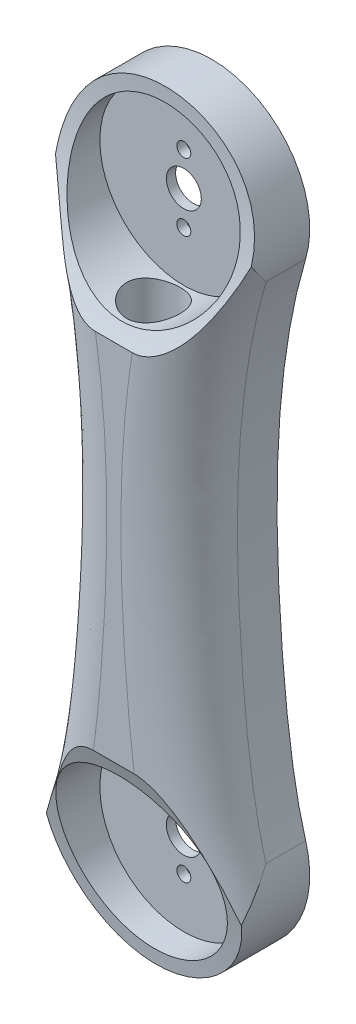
SolidWorks part; units mm, degrees
ref_plane "前视基准面" through (0, 0, 0) normal (0, 0, 1) x (1, 0, 0)
ref_plane "上视基准面" through (0, 0, 0) normal (0, 1, 0) x (1, 0, 0)
ref_plane "右视基准面" through (0, 0, 0) normal (1, 0, 0) x (0, 0, -1)
imported_body "输入1"
sketch "草图1" plane through (0, 0, 11) normal (0, 0, 1) x (1, 0, 0)
  line L0 (6.6769, 66.6848) -> (10.1769, 66.6848) construction
  line L1 (10.1769, 66.6848) -> (10.1769, 68.3002) construction
  line L2 (10.1769, 68.3002) -> (9.5487, 68.3002) construction
  line L3 (9.5487, 68.3002) -> (9.5487, 67.3131) construction
  line L4 (9.5487, 67.3131) -> (6.6769, 67.3131) construction
  line L5 (6.6769, 67.3131) -> (6.6769, 66.6848) construction
  line L6 (6.6769, 59.0118) -> (10.1769, 59.0118) construction
  line L7 (10.1769, 59.0118) -> (10.1769, 59.64) construction
  line L8 (10.1769, 59.64) -> (7.8807, 59.64) construction
  line L9 (7.8807, 59.64) -> (10.1769, 61.2238) construction
  line L10 (10.1769, 61.2238) -> (10.1769, 61.7938) construction
  line L11 (10.1769, 61.7938) -> (6.6769, 61.7938) construction
  line L12 (6.6769, 61.7938) -> (6.6769, 61.1656) construction
  line L13 (6.6769, 61.1656) -> (8.9801, 61.1656) construction
  line L14 (8.9801, 61.1656) -> (6.6769, 59.5776) construction
  line L15 (6.6769, 59.5776) -> (6.6769, 59.0118) construction
  line L16 (6.6769, 55.7361) -> (10.1769, 55.7361) construction
  line L17 (10.1769, 55.7361) -> (10.1769, 56.3643) construction
  line L18 (10.1769, 56.3643) -> (8.6513, 56.3643) construction
  line L19 (8.6513, 56.3643) -> (8.6513, 57.5759) construction
  line L20 (8.6513, 57.5759) -> (10.1769, 57.5759) construction
  line L21 (10.1769, 57.5759) -> (10.1769, 58.2041) construction
  line L22 (10.1769, 58.2041) -> (6.6769, 58.2041) construction
  line L23 (6.6769, 58.2041) -> (6.6769, 57.5759) construction
  line L24 (6.6769, 57.5759) -> (8.0231, 57.5759) construction
  line L25 (8.0231, 57.5759) -> (8.0231, 56.3643) construction
  line L26 (8.0231, 56.3643) -> (6.6769, 56.3643) construction
  line L27 (6.6769, 56.3643) -> (6.6769, 55.7361) construction
  line L28 (9.5985, 55.0939) -> (9.1294, 54.6473) construction
  line L29 (7.7244, 54.6473) -> (7.2841, 55.1079) construction
  line L30 (6.6769, 49.4541) -> (10.1769, 49.4541) construction
  line L31 (10.1769, 49.4541) -> (10.1769, 51.3387) construction
  line L32 (10.1769, 51.3387) -> (9.5487, 51.3387) construction
  line L33 (9.5487, 51.3387) -> (9.5487, 50.0823) construction
  line L34 (9.5487, 50.0823) -> (8.6064, 50.0823) construction
  line L35 (8.6064, 50.0823) -> (8.6064, 51.3387) construction
  line L36 (8.6064, 51.3387) -> (7.9782, 51.3387) construction
  line L37 (7.9782, 51.3387) -> (7.9782, 50.0823) construction
  line L38 (7.9782, 50.0823) -> (7.3051, 50.0823) construction
  line L39 (7.3051, 50.0823) -> (7.3051, 51.3387) construction
  line L40 (7.3051, 51.3387) -> (6.6769, 51.3387) construction
  line L41 (6.6769, 51.3387) -> (6.6769, 49.4541) construction
  line L42 (6.6769, 47.0759) -> (7.3051, 47.0759) construction
  line L43 (7.3051, 47.0759) -> (7.3051, 47.7041) construction
  line L44 (7.3051, 47.7041) -> (10.1769, 47.7041) construction
  line L45 (10.1769, 47.7041) -> (10.1769, 48.3323) construction
  line L46 (10.1769, 48.3323) -> (7.3051, 48.3323) construction
  line L47 (7.3051, 48.3323) -> (7.3051, 48.9605) construction
  line L48 (7.3051, 48.9605) -> (6.6769, 48.9605) construction
  line L49 (6.6769, 48.9605) -> (6.6769, 47.0759) construction
  line L50 (6.6769, 43.7554) -> (10.1769, 43.7554) construction
  line L51 (10.1769, 43.7554) -> (10.1769, 44.3836) construction
  line L52 (10.1769, 44.3836) -> (8.6064, 44.3836) construction
  line L53 (8.6064, 44.3836) -> (8.6064, 45.4605) construction
  line L54 (8.6064, 45.4605) -> (7.9782, 45.4605) construction
  line L55 (7.9782, 45.4605) -> (7.9782, 44.3836) construction
  line L56 (7.9782, 44.3836) -> (7.3051, 44.3836) construction
  line L57 (7.3051, 44.3836) -> (7.3051, 45.4605) construction
  line L58 (7.3051, 45.4605) -> (6.6769, 45.4605) construction
  line L59 (6.6769, 45.4605) -> (6.6769, 43.7554) construction
  line L60 (8.5314, 76.3772) -> (8.382, 76.3722) construction
  line L61 (8.382, 76.3722) -> (8.382, 74.6272) construction
  line L62 (8.382, 74.6272) -> (9.0102, 74.6272) construction
  line L63 (9.0102, 74.6272) -> (9.0102, 75.6319) construction
  line L64 (7.6886, 75.6543) -> (7.2336, 76.1297) construction
  line L65 (6.6769, 76.7137) -> (8.6611, 77.7233) construction
  line L66 (8.6611, 77.7233) -> (10.1769, 77.7233) construction
  line L67 (10.1769, 77.7233) -> (10.1769, 78.3515) construction
  line L68 (10.1769, 78.3515) -> (8.6611, 78.3515) construction
  line L69 (8.6611, 78.3515) -> (6.6769, 79.3611) construction
  line L70 (6.6769, 79.3611) -> (6.6769, 78.6621) construction
  line L71 (6.6769, 78.6621) -> (7.9046, 78.0374) construction
  line L72 (7.9046, 78.0374) -> (6.6769, 77.4127) construction
  line L73 (6.6769, 77.4127) -> (6.6769, 76.7137) construction
  line L74 (6.6769, 66.6848) -> (10.1769, 66.6848)
  line L75 (10.1769, 66.6848) -> (10.1769, 68.3002)
  line L76 (10.1769, 68.3002) -> (9.5487, 68.3002)
  line L77 (9.5487, 68.3002) -> (9.5487, 67.3131)
  line L78 (9.5487, 67.3131) -> (6.6769, 67.3131)
  line L79 (6.6769, 67.3131) -> (6.6769, 66.6848)
  line L80 (6.6769, 59.0118) -> (10.1769, 59.0118)
  line L81 (10.1769, 59.0118) -> (10.1769, 59.64)
  line L82 (10.1769, 59.64) -> (7.8807, 59.64)
  line L83 (7.8807, 59.64) -> (10.1769, 61.2238)
  line L84 (10.1769, 61.2238) -> (10.1769, 61.7938)
  line L85 (10.1769, 61.7938) -> (6.6769, 61.7938)
  line L86 (6.6769, 61.7938) -> (6.6769, 61.1656)
  line L87 (6.6769, 61.1656) -> (8.9801, 61.1656)
  line L88 (8.9801, 61.1656) -> (6.6769, 59.5776)
  line L89 (6.6769, 59.5776) -> (6.6769, 59.0118)
  line L90 (6.6769, 55.7361) -> (10.1769, 55.7361)
  line L91 (10.1769, 55.7361) -> (10.1769, 56.3643)
  line L92 (10.1769, 56.3643) -> (8.6513, 56.3643)
  line L93 (8.6513, 56.3643) -> (8.6513, 57.5759)
  line L94 (8.6513, 57.5759) -> (10.1769, 57.5759)
  line L95 (10.1769, 57.5759) -> (10.1769, 58.2041)
  line L96 (10.1769, 58.2041) -> (6.6769, 58.2041)
  line L97 (6.6769, 58.2041) -> (6.6769, 57.5759)
  line L98 (6.6769, 57.5759) -> (8.0231, 57.5759)
  line L99 (8.0231, 57.5759) -> (8.0231, 56.3643)
  line L100 (8.0231, 56.3643) -> (6.6769, 56.3643)
  line L101 (6.6769, 56.3643) -> (6.6769, 55.7361)
  line L102 (9.5985, 55.0939) -> (9.1294, 54.6473)
  line L103 (7.7244, 54.6473) -> (7.2841, 55.1079)
  line L104 (6.6769, 49.4541) -> (10.1769, 49.4541)
  line L105 (10.1769, 49.4541) -> (10.1769, 51.3387)
  line L106 (10.1769, 51.3387) -> (9.5487, 51.3387)
  line L107 (9.5487, 51.3387) -> (9.5487, 50.0823)
  line L108 (9.5487, 50.0823) -> (8.6064, 50.0823)
  line L109 (8.6064, 50.0823) -> (8.6064, 51.3387)
  line L110 (8.6064, 51.3387) -> (7.9782, 51.3387)
  line L111 (7.9782, 51.3387) -> (7.9782, 50.0823)
  line L112 (7.9782, 50.0823) -> (7.3051, 50.0823)
  line L113 (7.3051, 50.0823) -> (7.3051, 51.3387)
  line L114 (7.3051, 51.3387) -> (6.6769, 51.3387)
  line L115 (6.6769, 51.3387) -> (6.6769, 49.4541)
  line L116 (6.6769, 47.0759) -> (7.3051, 47.0759)
  line L117 (7.3051, 47.0759) -> (7.3051, 47.7041)
  line L118 (7.3051, 47.7041) -> (10.1769, 47.7041)
  line L119 (10.1769, 47.7041) -> (10.1769, 48.3323)
  line L120 (10.1769, 48.3323) -> (7.3051, 48.3323)
  line L121 (7.3051, 48.3323) -> (7.3051, 48.9605)
  line L122 (7.3051, 48.9605) -> (6.6769, 48.9605)
  line L123 (6.6769, 48.9605) -> (6.6769, 47.0759)
  line L124 (6.6769, 43.7554) -> (10.1769, 43.7554)
  line L125 (10.1769, 43.7554) -> (10.1769, 44.3836)
  line L126 (10.1769, 44.3836) -> (8.6064, 44.3836)
  line L127 (8.6064, 44.3836) -> (8.6064, 45.4605)
  line L128 (8.6064, 45.4605) -> (7.9782, 45.4605)
  line L129 (7.9782, 45.4605) -> (7.9782, 44.3836)
  line L130 (7.9782, 44.3836) -> (7.3051, 44.3836)
  line L131 (7.3051, 44.3836) -> (7.3051, 45.4605)
  line L132 (7.3051, 45.4605) -> (6.6769, 45.4605)
  line L133 (6.6769, 45.4605) -> (6.6769, 43.7554)
  line L134 (8.5314, 76.3772) -> (8.382, 76.3722)
  line L135 (8.382, 76.3722) -> (8.382, 74.6272)
  line L136 (8.382, 74.6272) -> (9.0102, 74.6272)
  line L137 (9.0102, 74.6272) -> (9.0102, 75.6319)
  line L138 (7.6886, 75.6543) -> (7.2336, 76.1297)
  line L139 (6.6769, 76.7137) -> (8.6611, 77.7233)
  line L140 (8.6611, 77.7233) -> (10.1769, 77.7233)
  line L141 (10.1769, 77.7233) -> (10.1769, 78.3515)
  line L142 (10.1769, 78.3515) -> (8.6611, 78.3515)
  line L143 (8.6611, 78.3515) -> (6.6769, 79.3611)
  line L144 (6.6769, 79.3611) -> (6.6769, 78.6621)
  line L145 (6.6769, 78.6621) -> (7.9046, 78.0374)
  line L146 (7.9046, 78.0374) -> (6.6769, 77.4127)
  line L147 (6.6769, 77.4127) -> (6.6769, 76.7137)
  spline S0 degree 3 poles (-2989.6173, -83.3481) (32.1422, 75.0342) (6.0871, 68.8225) (6.6015, 64.0056) (6.62, 63.8877) (6.6477, 63.7724) (6.6821, 63.6587) (6.724, 63.547) (6.775, 63.4378) (6.832, 63.3307) (6.8964, 63.228) (6.9666, 63.1305) (7.0417, 63.0383) (7.1226, 62.9518) (7.2091, 62.8711) (7.3008, 62.7958) (7.3989, 62.7274) (7.5007, 62.6633) (7.6071, 62.6067) (7.7169, 62.5577) (7.8288, 62.5152) (7.9436, 62.482) (8.0604, 62.4548) (8.1799, 62.4364) (13.0942, 61.9214) (19.3755, 88.0562) (-135.3447, -2933.9116) knots -4.915849 -4.915849 -4.915849 -4.915849 0.042136 0.083973 0.125159 0.166437 0.20741 0.248784 0.290614 0.332876 0.375096 0.416785 0.457965 0.498961 0.539956 0.581136 0.622542 0.664427 0.70636 0.747988 0.78959 0.830959 0.872419 0.914326 0.95689 6.014513 6.014513 6.014513 6.014513 only from (6.5872, 64.2463) to (8.4255, 62.422) construction
  spline S1 degree 3 poles (189.4099, -2931.9098) (-5.4705, 93.0554) (2.6998, 61.6308) (8.7873, 62.4512) (8.9597, 62.492) (9.1253, 62.5498) (9.2852, 62.6231) (9.4383, 62.7132) (9.5846, 62.8199) (9.7232, 62.9409) (9.8498, 63.0744) (9.9619, 63.2174) (10.0559, 63.3695) (10.1338, 63.5295) (10.1937, 63.6981) (10.2351, 63.8753) (11.1106, 69.8435) (-22.4785, 78.2807) (3003.3192, -137.8758) knots -6.173236 -6.173236 -6.173236 -6.173236 0.06384 0.125981 0.186796 0.247379 0.307705 0.369005 0.431332 0.495431 0.559581 0.621958 0.683596 0.744762 0.806272 0.868851 0.933253 7.05133 7.05133 7.05133 7.05133 only from (8.4255, 62.422) to (10.2666, 64.2513) construction
  spline S2 degree 3 poles (3004.965, 240.2709) (-20.8218, 50.5464) (11.0682, 58.6081) (10.237, 64.6125) (10.1943, 64.7834) (10.1372, 64.9481) (10.0615, 65.1048) (9.9696, 65.2546) (9.8611, 65.3973) (9.7371, 65.5314) (9.6015, 65.6539) (9.4574, 65.762) (9.3056, 65.853) (9.1465, 65.9279) (8.9795, 65.9853) (8.8053, 66.0269) (2.7167, 66.8623) (-5.4939, 34.8133) (189.201, 3060.4124) knots -6.150444 -6.150444 -6.150444 -6.150444 0.064503 0.127079 0.188403 0.248921 0.309521 0.370449 0.432877 0.497203 0.561561 0.624233 0.685663 0.746822 0.808265 0.870483 0.934273 7.236598 7.236598 7.236598 7.236598 only from (10.2666, 64.2513) to (8.4374, 66.0566) construction
  spline S3 degree 3 poles (-189.2582, 3059.3573) (22.4152, 33.9153) (14.0541, 66.885) (8.0659, 66.0258) (7.8899, 65.9849) (7.721, 65.9264) (7.5601, 65.8502) (7.4065, 65.7576) (7.2596, 65.6493) (7.1232, 65.5243) (6.9979, 65.389) (6.8874, 65.2456) (6.7957, 65.0947) (6.7187, 64.9381) (6.66, 64.7743) (6.6178, 64.604) (5.7659, 58.7987) (38.376, 50.6626) (-2986.8638, 260.8883) knots -6.098299 -6.098299 -6.098299 -6.098299 0.066066 0.129992 0.192552 0.25417 0.315834 0.377776 0.440807 0.505633 0.570265 0.632811 0.69392 0.754046 0.814368 0.874854 0.93661 6.91392 6.91392 6.91392 6.91392 only from (8.4374, 66.0566) to (6.5872, 64.2463) construction
  spline S4 degree 3 poles (-2004.1356, 2280.7098) (29.3454, 46.0562) (10.8396, 58.6346) (7.1256, 54.9601) (7.0543, 54.8802) (6.9875, 54.7971) (6.9249, 54.711) (6.8676, 54.6211) (6.8145, 54.5282) (6.7671, 54.4319) (6.7255, 54.3331) (6.6879, 54.2337) (6.657, 54.133) (6.632, 54.0311) (6.6113, 53.9285) (6.5975, 53.8247) (6.1904, 48.9652) (28.6358, 43.1527) (-2991.037, 168.8527) knots -9.018076 -9.018076 -9.018076 -9.018076 0.064226 0.127482 0.190543 0.252994 0.315582 0.378249 0.440835 0.504257 0.567427 0.629911 0.691589 0.753179 0.814947 0.876106 0.937729 9.411089 9.411089 9.411089 9.411089 only from (7.2841, 55.1079) to (6.5872, 53.6145) construction
  spline S5 degree 3 poles (-2991.0574, -61.7883) (29.822, 65.172) (6.108, 58.7608) (6.6011, 53.369) (6.621, 53.2495) (6.6474, 53.1315) (6.6827, 53.0159) (6.7256, 52.9024) (6.7755, 52.7907) (6.8336, 52.6823) (6.8974, 52.5777) (6.9674, 52.4792) (7.0415, 52.3861) (7.1216, 52.3002) (7.2059, 52.2198) (7.2953, 52.1458) (7.39, 52.0788) (7.489, 52.0173) (7.5928, 51.9636) (7.7003, 51.9166) (7.8114, 51.8761) (7.9265, 51.8447) (8.0446, 51.8177) (8.1671, 51.8012) (13.3778, 51.2997) (19.8975, 76.9032) (-131.2438, -2944.8422) knots -5.487517 -5.487517 -5.487517 -5.487517 0.042969 0.085121 0.127162 0.168716 0.210546 0.252545 0.294572 0.337445 0.380138 0.42174 0.462814 0.503503 0.543661 0.583641 0.623832 0.66403 0.704507 0.745032 0.785784 0.82711 0.868847 0.911497 0.955341 6.299547 6.299547 6.299547 6.299547 only from (6.5872, 53.6145) to (8.4213, 51.7874) construction
  spline S6 degree 3 poles (176.5261, -2943.438) (-5.8901, 83.4326) (2.4638, 50.9971) (8.8061, 51.8159) (8.9864, 51.8556) (9.1576, 51.9119) (9.3198, 51.9839) (9.4737, 52.0707) (9.6171, 52.1756) (9.7506, 52.2943) (9.8714, 52.4254) (9.9773, 52.5671) (10.0669, 52.7179) (10.14, 52.8778) (10.1972, 53.0467) (10.2376, 53.2245) (11.0613, 59.6154) (-20.7225, 68.0022) (3005.3329, -116.5526) knots -6.392402 -6.392402 -6.392402 -6.392402 0.06809 0.133507 0.196785 0.258508 0.319212 0.379722 0.44053 0.502221 0.563862 0.624373 0.684412 0.744654 0.805539 0.868163 0.932624 7.444929 7.444929 7.444929 7.444929 only from (8.4213, 51.7874) to (10.2666, 53.6047) construction
  spline S7 degree 3 poles (3008.7125, 145.4006) (-11.1112, 42.9512) (10.6171, 48.759) (10.2583, 53.8145) (10.2473, 53.9157) (10.2311, 54.0134) (10.2108, 54.1088) (10.1857, 54.2007) (10.156, 54.2899) (10.1216, 54.3766) (10.081, 54.4629) (10.0332, 54.5492) (9.979, 54.6374) (9.9171, 54.7265) (9.8474, 54.8165) (9.7719, 54.9088) (4.8609, 60.3128) (-13.4959, 52.7453) (2157.9496, 2148.752) knots -8.843795 -8.843795 -8.843795 -8.843795 0.06333 0.125538 0.185479 0.24458 0.302099 0.359094 0.41442 0.469574 0.525291 0.584202 0.645359 0.709722 0.77746 0.848184 0.922217 13.788164 13.788164 13.788164 13.788164 only from (10.2666, 53.6047) to (9.5985, 55.0939) construction
  spline S8 degree 3 poles (2156.6898, 2149.228) (-11.769, 49.1306) (5.6127, 58.4672) (9.2619, 54.5097) (9.321, 54.443) (9.3736, 54.3768) (9.4208, 54.3123) (9.4623, 54.2492) (9.4983, 54.1875) (9.5383, 54.1071) (9.5796, 54.0045) (9.6136, 53.8757) (10.3539, 49.0896) (-19.9157, 41.955) (3001.5734, 270.3629) knots -13.227242 -13.227242 -13.227242 -13.227242 0.082257 0.160433 0.235 0.305295 0.371825 0.434732 0.494188 0.550394 0.659269 0.770012 0.882942 12.741822 12.741822 12.741822 12.741822 only from (9.1294, 54.6473) to (9.6384, 53.6019) construction
  spline S9 degree 3 poles (3005.6844, -97.0374) (-13.0545, 62.0674) (10.0159, 57.1338) (9.6292, 53.4383) (9.618, 53.3587) (9.5997, 53.2815) (9.5786, 53.2055) (9.5507, 53.1321) (9.5196, 53.0599) (9.482, 52.9912) (9.4417, 52.9243) (9.3968, 52.8613) (9.3481, 52.8022) (9.2963, 52.7465) (9.2401, 52.6954) (9.1802, 52.6483) (9.1168, 52.6046) (9.05, 52.5647) (8.9796, 52.53) (8.9074, 52.4985) (8.8321, 52.4738) (8.7544, 52.4525) (8.6744, 52.4358) (8.5917, 52.4238) (4.4061, 52.07) (-0.6104, 73.6259) (113.5454, -2945.5502) knots -5.714342 -5.714342 -5.714342 -5.714342 0.043415 0.086272 0.128302 0.169793 0.21112 0.252317 0.293323 0.334625 0.375564 0.416183 0.456166 0.495979 0.535813 0.575621 0.615818 0.656883 0.698005 0.739201 0.780724 0.82266 0.865869 0.909355 0.954011 7.470713 7.470713 7.470713 7.470713 only from (9.6384, 53.6019) to (8.4199, 52.4156) construction
  spline S10 degree 3 poles (-165.0097, -2942.4682) (19.4191, 78.7559) (12.9548, 51.8224) (8.1758, 52.4345) (8.0605, 52.4612) (7.9502, 52.4987) (7.8448, 52.5464) (7.7444, 52.6047) (7.6505, 52.6752) (7.5612, 52.7534) (7.4801, 52.84) (7.4093, 52.9326) (7.3488, 53.03) (7.3006, 53.1328) (7.2624, 53.2401) (7.2349, 53.3523) (6.6071, 57.8886) (34.1927, 64.2821) (-2986.805, -134.1964) knots -7.493459 -7.493459 -7.493459 -7.493459 0.06657 0.130985 0.193881 0.255437 0.316968 0.37842 0.440665 0.504457 0.567897 0.629994 0.690549 0.750881 0.811148 0.872313 0.935296 8.11554 8.11554 8.11554 8.11554 only from (8.4199, 52.4156) to (7.2154, 53.59) construction
  spline S11 degree 3 poles (-2983.0016, 294.1399) (38.3815, 41.7424) (6.4282, 49.1799) (7.2443, 53.8772) (7.2844, 54.0158) (7.3412, 54.1503) (7.4133, 54.2812) (7.5006, 54.4089) (11.3141, 58.9038) (37.0798, 42.0681) (-2135.2713, 2153.8898) knots -11.433484 -11.433484 -11.433484 -11.433484 0.120206 0.238991 0.357358 0.477439 0.600452 0.72768 0.860586 15.196841 15.196841 15.196841 15.196841 only from (7.2154, 53.59) to (7.7244, 54.6473) construction
  spline S12 degree 3 poles (-2989.6173, -106.2776) (32.1422, 52.1047) (6.0871, 45.893) (6.6015, 41.0762) (6.62, 40.9582) (6.6477, 40.8429) (6.6821, 40.7293) (6.724, 40.6175) (6.775, 40.5083) (6.832, 40.4012) (6.8964, 40.2985) (6.9666, 40.2011) (7.0417, 40.1088) (7.1226, 40.0223) (7.2091, 39.9416) (7.3008, 39.8663) (7.3989, 39.7979) (7.5007, 39.7338) (7.6071, 39.6772) (7.7169, 39.6282) (7.8288, 39.5857) (7.9436, 39.5525) (8.0604, 39.5253) (8.1799, 39.5069) (13.0942, 38.9919) (19.3755, 65.1267) (-135.3447, -2956.8411) knots -4.915849 -4.915849 -4.915849 -4.915849 0.042136 0.083973 0.125159 0.166437 0.20741 0.248784 0.290614 0.332876 0.375096 0.416785 0.457965 0.498961 0.539956 0.581136 0.622542 0.664427 0.70636 0.747988 0.78959 0.830959 0.872419 0.914326 0.95689 6.014513 6.014513 6.014513 6.014513 only from (6.5872, 41.3169) to (8.4255, 39.4925) construction
  spline S13 degree 3 poles (189.4099, -2954.8392) (-5.4705, 70.1259) (2.6998, 38.7013) (8.7873, 39.5217) (8.9597, 39.5625) (9.1253, 39.6203) (9.2852, 39.6937) (9.4383, 39.7837) (9.5846, 39.8905) (9.7232, 40.0114) (9.8498, 40.1449) (9.9619, 40.2879) (10.0559, 40.44) (10.1338, 40.6) (10.1937, 40.7687) (10.2351, 40.9458) (11.1106, 46.914) (-22.4785, 55.3512) (3003.3192, -160.8053) knots -6.173236 -6.173236 -6.173236 -6.173236 0.06384 0.125981 0.186796 0.247379 0.307705 0.369005 0.431332 0.495431 0.559581 0.621958 0.683596 0.744762 0.806272 0.868851 0.933253 7.05133 7.05133 7.05133 7.05133 only from (8.4255, 39.4925) to (10.2666, 41.3218) construction
  spline S14 degree 3 poles (3004.965, 217.3415) (-20.8218, 27.6169) (11.0682, 35.6786) (10.237, 41.683) (10.1943, 41.8539) (10.1372, 42.0186) (10.0615, 42.1753) (9.9696, 42.3251) (9.8611, 42.4679) (9.7371, 42.6019) (9.6015, 42.7244) (9.4574, 42.8325) (9.3056, 42.9235) (9.1465, 42.9984) (8.9795, 43.0558) (8.8053, 43.0974) (2.7167, 43.9328) (-5.4939, 11.8838) (189.201, 3037.4829) knots -6.150444 -6.150444 -6.150444 -6.150444 0.064503 0.127079 0.188403 0.248921 0.309521 0.370449 0.432877 0.497203 0.561561 0.624233 0.685663 0.746822 0.808265 0.870483 0.934273 7.236598 7.236598 7.236598 7.236598 only from (10.2666, 41.3218) to (8.4374, 43.1272) construction
  spline S15 degree 3 poles (-189.2582, 3036.4278) (22.4152, 10.9858) (14.0541, 43.9555) (8.0659, 43.0963) (7.8899, 43.0554) (7.721, 42.9969) (7.5601, 42.9207) (7.4065, 42.8281) (7.2596, 42.7198) (7.1232, 42.5948) (6.9979, 42.4595) (6.8874, 42.3161) (6.7957, 42.1652) (6.7187, 42.0086) (6.66, 41.8448) (6.6178, 41.6745) (5.7659, 35.8692) (38.376, 27.7331) (-2986.8638, 237.9588) knots -6.098299 -6.098299 -6.098299 -6.098299 0.066066 0.129992 0.192552 0.25417 0.315834 0.377776 0.440807 0.505633 0.570265 0.632811 0.69392 0.754046 0.814368 0.874854 0.93661 6.91392 6.91392 6.91392 6.91392 only from (8.4374, 43.1272) to (6.5872, 41.3169) construction
  spline S16 degree 3 poles (-2989.6173, -77.1109) (32.1422, 81.2714) (6.0871, 75.0596) (6.6015, 70.2428) (6.62, 70.1249) (6.6477, 70.0095) (6.6821, 69.8959) (6.724, 69.7842) (6.775, 69.675) (6.832, 69.5679) (6.8964, 69.4652) (6.9666, 69.3677) (7.0417, 69.2754) (7.1226, 69.189) (7.2091, 69.1083) (7.3008, 69.0329) (7.3989, 68.9646) (7.5007, 68.9005) (7.6071, 68.8439) (7.7169, 68.7949) (7.8288, 68.7524) (7.9436, 68.7192) (8.0604, 68.692) (8.1799, 68.6736) (13.0942, 68.1586) (19.3755, 94.2934) (-135.3447, -2927.6744) knots -4.915849 -4.915849 -4.915849 -4.915849 0.042136 0.083973 0.125159 0.166437 0.20741 0.248784 0.290614 0.332876 0.375096 0.416785 0.457965 0.498961 0.539956 0.581136 0.622542 0.664427 0.70636 0.747988 0.78959 0.830959 0.872419 0.914326 0.95689 6.014513 6.014513 6.014513 6.014513 only from (6.5872, 70.4835) to (8.4255, 68.6592) construction
  spline S17 degree 3 poles (189.4099, -2925.6726) (-5.4705, 99.2926) (2.6998, 67.868) (8.7873, 68.6884) (8.9597, 68.7291) (9.1253, 68.787) (9.2852, 68.8603) (9.4383, 68.9504) (9.5846, 69.0571) (9.7232, 69.1781) (9.8498, 69.3116) (9.9619, 69.4546) (10.0559, 69.6067) (10.1338, 69.7667) (10.1937, 69.9353) (10.2351, 70.1124) (11.1106, 76.0807) (-22.4785, 84.5179) (3003.3192, -131.6386) knots -6.173236 -6.173236 -6.173236 -6.173236 0.06384 0.125981 0.186796 0.247379 0.307705 0.369005 0.431332 0.495431 0.559581 0.621958 0.683596 0.744762 0.806272 0.868851 0.933253 7.05133 7.05133 7.05133 7.05133 only from (8.4255, 68.6592) to (10.2666, 70.4884) construction
  spline S18 degree 3 poles (3004.965, 246.5081) (-20.8218, 56.7836) (11.0682, 64.8453) (10.237, 70.8497) (10.1943, 71.0206) (10.1372, 71.1853) (10.0615, 71.342) (9.9696, 71.4918) (9.8611, 71.6345) (9.7371, 71.7686) (9.6015, 71.8911) (9.4574, 71.9991) (9.3056, 72.0901) (9.1465, 72.1651) (8.9795, 72.2224) (8.8053, 72.264) (2.7167, 73.0995) (-5.4939, 41.0505) (189.201, 3066.6496) knots -6.150444 -6.150444 -6.150444 -6.150444 0.064503 0.127079 0.188403 0.248921 0.309521 0.370449 0.432877 0.497203 0.561561 0.624233 0.685663 0.746822 0.808265 0.870483 0.934273 7.236598 7.236598 7.236598 7.236598 only from (10.2666, 70.4884) to (8.4374, 72.2938) construction
  spline S19 degree 3 poles (-189.2582, 3065.5945) (22.4152, 40.1525) (14.0541, 73.1222) (8.0659, 72.263) (7.8899, 72.2221) (7.721, 72.1636) (7.5601, 72.0874) (7.4065, 71.9948) (7.2596, 71.8865) (7.1232, 71.7615) (6.9979, 71.6262) (6.8874, 71.4828) (6.7957, 71.3319) (6.7187, 71.1752) (6.66, 71.0114) (6.6178, 70.8412) (5.7659, 65.0358) (38.376, 56.8998) (-2986.8638, 267.1255) knots -6.098299 -6.098299 -6.098299 -6.098299 0.066066 0.129992 0.192552 0.25417 0.315834 0.377776 0.440807 0.505633 0.570265 0.632811 0.69392 0.754046 0.814368 0.874854 0.93661 6.91392 6.91392 6.91392 6.91392 only from (8.4374, 72.2938) to (6.5872, 70.4835) construction
  spline S20 degree 3 poles (-2105.9692, 2205.2772) (29.7798, 69.4972) (11.004, 80.155) (7.0761, 75.9699) (7.0064, 75.8886) (6.9435, 75.8063) (6.8854, 75.7246) (6.8352, 75.6412) (4.8792, 72.0812) (24.394, 58.1368) (-2697.2699, 1374.5957) knots -20.597754 -20.597754 -20.597754 -20.597754 0.140358 0.275332 0.405806 0.532095 0.654331 0.772596 0.888197 15.510264 15.510264 15.510264 15.510264 only from (7.2336, 76.1297) to (6.7526, 75.4734) construction
  spline S21 degree 3 poles (-2805.8722, 1118.97) (30.859, 77.1147) (8.2327, 80.0622) (6.6797, 75.271) (6.6505, 75.1671) (6.6277, 75.0609) (6.6092, 74.9531) (6.5969, 74.8433) (6.2081, 69.4255) (27.6431, 63.1995) (-2991.6115, 174.7448) knots -16.880689 -16.880689 -16.880689 -16.880689 0.122699 0.245779 0.368768 0.49255 0.617625 0.743386 0.871024 19.222153 19.222153 19.222153 19.222153 only from (6.7526, 75.4734) to (6.5872, 74.6194) construction
  spline S22 degree 3 poles (-2991.4918, -30.9219) (29.3368, 84.9569) (6.2105, 79.2296) (6.5964, 74.407) (6.6078, 74.3043) (6.625, 74.2042) (6.6456, 74.1062) (6.6726, 74.0111) (6.7032, 73.9183) (6.7393, 73.8283) (6.7795, 73.7407) (6.8258, 73.6561) (6.8758, 73.5737) (6.931, 73.494) (6.9904, 73.4168) (7.0554, 73.3425) (10.3045, 69.9329) (29.3364, 82.8771) (-2069.1405, -2091.9325) knots -8.900116 -8.900116 -8.900116 -8.900116 0.06774 0.133884 0.198527 0.262295 0.324833 0.386935 0.448126 0.508722 0.569325 0.629344 0.690136 0.750521 0.811657 0.873384 0.936213 9.668618 9.668618 9.668618 9.668618 only from (6.5872, 74.6194) to (7.1992, 73.2018) construction
  spline S23 degree 3 poles (-1856.3651, -2277.5204) (17.4025, 104.3311) (2.6741, 76.2546) (7.4658, 72.9987) (7.6093, 72.9199) (7.7584, 72.8553) (7.9129, 72.8041) (8.0734, 72.7689) (13.7246, 71.9958) (21.531, 103.4224) (-180.4539, -2921.0828) knots -12.71645 -12.71645 -12.71645 -12.71645 0.128632 0.253567 0.376748 0.49907 0.621091 0.744754 0.870742 13.514591 13.514591 13.514591 13.514591 only from (7.1992, 73.2018) to (8.4094, 72.7425) construction
  spline S24 degree 3 poles (124.4172, -2924.8379) (-3.31, 95.8867) (3.185, 72.264) (8.6581, 72.7564) (8.7798, 72.7763) (8.8992, 72.8036) (9.0167, 72.838) (9.1316, 72.881) (9.2447, 72.9316) (9.3551, 72.9894) (9.4609, 73.0546) (9.5619, 73.1243) (9.655, 73.2015) (9.7434, 73.2826) (9.8244, 73.3705) (9.8999, 73.4633) (9.9686, 73.5618) (10.0311, 73.6655) (10.0862, 73.7741) (10.1349, 73.8864) (10.1754, 74.0027) (10.2094, 74.1222) (10.2341, 74.2459) (10.2534, 74.3729) (10.7374, 79.9581) (-14.0573, 86.4911) (3008.3508, -26.419) knots -5.427977 -5.427977 -5.427977 -5.427977 0.042343 0.084125 0.125558 0.167025 0.207945 0.249313 0.29101 0.333205 0.375334 0.416589 0.457244 0.497561 0.537878 0.578051 0.618454 0.659284 0.700414 0.741609 0.782959 0.82495 0.86719 0.910456 0.954828 6.532667 6.532667 6.532667 6.532667 only from (8.4094, 72.7425) to (10.2666, 74.637) construction
  spline S25 degree 3 poles (3007.4864, 201.0037) (-14.0479, 63.2668) (10.7337, 69.6522) (10.2537, 74.8823) (10.2373, 74.9994) (10.2134, 75.1126) (10.1824, 75.2217) (10.1449, 75.3268) (10.0994, 75.4275) (10.0483, 75.5243) (9.991, 75.6173) (9.926, 75.7048) (9.8558, 75.7884) (9.7798, 75.8682) (9.6971, 75.9431) (9.6077, 76.0131) (9.5127, 76.0793) (9.4125, 76.1407) (9.308, 76.1954) (9.2016, 76.2442) (9.0939, 76.2859) (8.984, 76.3186) (8.8731, 76.3447) (8.7605, 76.3637) (3.9512, 76.8491) (-2.0391, 52.1507) (139.4502, 3073.4037) knots -5.608896 -5.608896 -5.608896 -5.608896 0.04579 0.089939 0.133082 0.17516 0.216361 0.257127 0.297189 0.337111 0.376847 0.416535 0.456282 0.496253 0.536985 0.578319 0.620384 0.663538 0.706889 0.749342 0.791513 0.833175 0.87467 0.916163 0.958044 6.157073 6.157073 6.157073 6.157073 only from (10.2666, 74.637) to (8.5314, 76.3772) construction
  spline S26 degree 3 poles (1357.3958, 2755.4433) (-8.044, 60.0721) (5.5281, 77.619) (9.1612, 75.5533) (9.2288, 75.5089) (9.2915, 75.4621) (9.3484, 75.4115) (9.3997, 75.3579) (9.4463, 75.3019) (9.487, 75.2426) (9.5233, 75.1804) (9.5539, 75.1146) (9.5798, 75.0453) (9.6019, 74.9732) (9.6176, 74.897) (9.6294, 74.8177) (10.0132, 70.9744) (-13.1232, 66.054) (3006.7507, 203.9812) knots -9.866963 -9.866963 -9.866963 -9.866963 0.070329 0.137724 0.202445 0.265235 0.326319 0.385716 0.444172 0.501708 0.559036 0.617536 0.676578 0.737206 0.799445 0.863853 0.930651 10.103938 10.103938 10.103938 10.103938 only from (9.0102, 75.6319) to (9.6384, 74.6496) construction
  spline S27 degree 3 poles (3004.3774, -101.5092) (-18.1174, 85.8492) (10.2634, 79.218) (9.6182, 74.3905) (9.5899, 74.2683) (9.5515, 74.1511) (9.5008, 74.0393) (9.4386, 73.9331) (9.3661, 73.8319) (9.2823, 73.7385) (9.1912, 73.6525) (9.094, 73.5772) (8.9923, 73.5126) (8.8846, 73.4617) (8.7728, 73.4203) (8.6556, 73.392) (4.2148, 72.7229) (-2.4577, 102.0818) (221.6907, -2918.9311) knots -7.177059 -7.177059 -7.177059 -7.177059 0.067065 0.132147 0.195097 0.257094 0.318973 0.380934 0.443412 0.507448 0.571153 0.633061 0.693752 0.753532 0.813534 0.874153 0.936123 7.610692 7.610692 7.610692 7.610692 only from (9.6384, 74.6496) to (8.4087, 73.3707) construction
  spline S28 degree 3 poles (-200.8039, -2919.1907) (19.1106, 101.3266) (12.5739, 72.7399) (8.1697, 73.3913) (8.0564, 73.4184) (7.9478, 73.4573) (7.8436, 73.5072) (7.7445, 73.5687) (7.65, 73.6406) (7.5617, 73.723) (7.4808, 73.8134) (7.4096, 73.9103) (7.3496, 74.0128) (7.3003, 74.1203) (7.2624, 74.2334) (7.235, 74.3515) (6.6039, 79.1099) (34.4484, 85.6608) (-2987.279, -104.1087) knots -6.78528 -6.78528 -6.78528 -6.78528 0.063891 0.126139 0.186545 0.246527 0.306737 0.367509 0.429279 0.492867 0.556775 0.619502 0.681153 0.742868 0.804808 0.868069 0.932811 8.32293 8.32293 8.32293 8.32293 only from (8.4087, 73.3707) to (7.2154, 74.6019) construction
  spline S29 degree 3 poles (-2985.1531, 286.4486) (36.8762, 62.5208) (6.47, 69.8638) (7.2422, 74.8931) (7.2795, 75.0325) (7.3317, 75.1672) (7.399, 75.297) (7.4808, 75.422) (10.8745, 79.6811) (37.4034, 62.6267) (-2191.0359, 2116.34) knots -12.451827 -12.451827 -12.451827 -12.451827 0.12474 0.246561 0.367573 0.488504 0.610759 0.736193 0.865553 14.337967 14.337967 14.337967 14.337967 only from (7.2154, 74.6019) to (7.6886, 75.6543) construction
  spline S30 degree 3 poles (6.5872, 64.2463) (6.5877, 64.2059) (6.5888, 64.1252) (6.6015, 64.0056) (6.62, 63.8877) (6.6477, 63.7724) (6.6821, 63.6587) (6.724, 63.547) (6.775, 63.4378) (6.832, 63.3307) (6.8964, 63.228) (6.9666, 63.1305) (7.0417, 63.0383) (7.1226, 62.9518) (7.2091, 62.8711) (7.3008, 62.7958) (7.3989, 62.7274) (7.5007, 62.6633) (7.6071, 62.6067) (7.7169, 62.5577) (7.8288, 62.5152) (7.9436, 62.482) (8.0604, 62.4548) (8.1799, 62.4364) (8.3018, 62.4236) (8.3841, 62.4226) (8.4255, 62.422) knots 0 0 0 0 0.042136 0.083973 0.125159 0.166437 0.20741 0.248784 0.290614 0.332876 0.375096 0.416785 0.457965 0.498961 0.539956 0.581136 0.622542 0.664427 0.70636 0.747988 0.78959 0.830959 0.872419 0.914326 0.95689 1 1 1 1
  spline S31 degree 3 poles (8.4255, 62.422) (8.487, 62.4237) (8.6085, 62.4271) (8.7873, 62.4512) (8.9597, 62.492) (9.1253, 62.5498) (9.2852, 62.6231) (9.4383, 62.7132) (9.5846, 62.8199) (9.7232, 62.9409) (9.8498, 63.0744) (9.9619, 63.2174) (10.0559, 63.3695) (10.1338, 63.5295) (10.1937, 63.6981) (10.2351, 63.8753) (10.2623, 64.0604) (10.2652, 64.1869) (10.2666, 64.2513) knots 0 0 0 0 0.06384 0.125981 0.186796 0.247379 0.307705 0.369005 0.431332 0.495431 0.559581 0.621958 0.683596 0.744762 0.806272 0.868851 0.933253 1 1 1 1
  spline S32 degree 3 poles (10.2666, 64.2513) (10.265, 64.3128) (10.2617, 64.434) (10.237, 64.6125) (10.1943, 64.7834) (10.1372, 64.9481) (10.0615, 65.1048) (9.9696, 65.2546) (9.8611, 65.3973) (9.7371, 65.5314) (9.6015, 65.6539) (9.4574, 65.762) (9.3056, 65.853) (9.1465, 65.9279) (8.9795, 65.9853) (8.8053, 66.0269) (8.6237, 66.0518) (8.5001, 66.055) (8.4374, 66.0566) knots 0 0 0 0 0.064503 0.127079 0.188403 0.248921 0.309521 0.370449 0.432877 0.497203 0.561561 0.624233 0.685663 0.746822 0.808265 0.870483 0.934273 1 1 1 1
  spline S33 degree 3 poles (8.4374, 66.0566) (8.374, 66.0551) (8.2492, 66.0521) (8.0659, 66.0258) (7.8899, 65.9849) (7.721, 65.9264) (7.5601, 65.8502) (7.4065, 65.7576) (7.2596, 65.6493) (7.1232, 65.5243) (6.9979, 65.389) (6.8874, 65.2456) (6.7957, 65.0947) (6.7187, 64.9381) (6.66, 64.7743) (6.6178, 64.604) (6.5918, 64.4273) (6.5887, 64.3072) (6.5872, 64.2463) knots 0 0 0 0 0.066066 0.129992 0.192552 0.25417 0.315834 0.377776 0.440807 0.505633 0.570265 0.632811 0.69392 0.754046 0.814368 0.874854 0.93661 1 1 1 1
  spline S34 degree 3 poles (7.2841, 55.1079) (7.2567, 55.0839) (7.2024, 55.0362) (7.1256, 54.9601) (7.0543, 54.8802) (6.9875, 54.7971) (6.9249, 54.711) (6.8676, 54.6211) (6.8145, 54.5282) (6.7671, 54.4319) (6.7255, 54.3331) (6.6879, 54.2337) (6.657, 54.133) (6.632, 54.0311) (6.6113, 53.9285) (6.5975, 53.8247) (6.5887, 53.7201) (6.5877, 53.6498) (6.5872, 53.6145) knots 0 0 0 0 0.064226 0.127482 0.190543 0.252994 0.315582 0.378249 0.440835 0.504257 0.567427 0.629911 0.691589 0.753179 0.814947 0.876106 0.937729 1 1 1 1
  spline S35 degree 3 poles (6.5872, 53.6145) (6.5881, 53.5731) (6.5899, 53.4912) (6.6011, 53.369) (6.621, 53.2495) (6.6474, 53.1315) (6.6827, 53.0159) (6.7256, 52.9024) (6.7755, 52.7907) (6.8336, 52.6823) (6.8974, 52.5777) (6.9674, 52.4792) (7.0415, 52.3861) (7.1216, 52.3002) (7.2059, 52.2198) (7.2953, 52.1458) (7.39, 52.0788) (7.489, 52.0173) (7.5928, 51.9636) (7.7003, 51.9166) (7.8114, 51.8761) (7.9265, 51.8447) (8.0446, 51.8177) (8.1671, 51.8012) (8.293, 51.7891) (8.3783, 51.788) (8.4213, 51.7874) knots 0 0 0 0 0.042969 0.085121 0.127162 0.168716 0.210546 0.252545 0.294572 0.337445 0.380138 0.42174 0.462814 0.503503 0.543661 0.583641 0.623832 0.66403 0.704507 0.745032 0.785784 0.82711 0.868847 0.911497 0.955341 1 1 1 1
  spline S36 degree 3 poles (8.4213, 51.7874) (8.4873, 51.7888) (8.6166, 51.7914) (8.8061, 51.8159) (8.9864, 51.8556) (9.1576, 51.9119) (9.3198, 51.9839) (9.4737, 52.0707) (9.6171, 52.1756) (9.7506, 52.2943) (9.8714, 52.4254) (9.9773, 52.5671) (10.0669, 52.7179) (10.14, 52.8778) (10.1972, 53.0467) (10.2376, 53.2245) (10.2617, 53.4117) (10.265, 53.5394) (10.2666, 53.6047) knots 0 0 0 0 0.06809 0.133507 0.196785 0.258508 0.319212 0.379722 0.44053 0.502221 0.563862 0.624373 0.684412 0.744654 0.805539 0.868163 0.932624 1 1 1 1
  spline S37 degree 3 poles (10.2666, 53.6047) (10.2663, 53.6403) (10.2656, 53.7107) (10.2583, 53.8145) (10.2473, 53.9157) (10.2311, 54.0134) (10.2108, 54.1088) (10.1857, 54.2007) (10.156, 54.2899) (10.1216, 54.3766) (10.081, 54.4629) (10.0332, 54.5492) (9.979, 54.6374) (9.9171, 54.7265) (9.8474, 54.8165) (9.7719, 54.9088) (9.6879, 55.0012) (9.6288, 55.0625) (9.5985, 55.0939) knots 0 0 0 0 0.06333 0.125538 0.185479 0.24458 0.302099 0.359094 0.41442 0.469574 0.525291 0.584202 0.645359 0.709722 0.77746 0.848184 0.922217 1 1 1 1
  spline S38 degree 3 poles (9.1294, 54.6473) (9.1527, 54.6241) (9.1982, 54.5788) (9.2619, 54.5097) (9.321, 54.443) (9.3736, 54.3768) (9.4208, 54.3123) (9.4623, 54.2492) (9.4983, 54.1875) (9.5383, 54.1071) (9.5796, 54.0045) (9.6136, 53.8757) (9.6344, 53.7407) (9.6371, 53.6487) (9.6384, 53.6019) knots 0 0 0 0 0.082257 0.160433 0.235 0.305295 0.371825 0.434732 0.494188 0.550394 0.659269 0.770012 0.882942 1 1 1 1
  spline S39 degree 3 poles (9.6384, 53.6019) (9.6382, 53.5743) (9.6377, 53.5195) (9.6292, 53.4383) (9.618, 53.3587) (9.5997, 53.2815) (9.5786, 53.2055) (9.5507, 53.1321) (9.5196, 53.0599) (9.482, 52.9912) (9.4417, 52.9243) (9.3968, 52.8613) (9.3481, 52.8022) (9.2963, 52.7465) (9.2401, 52.6954) (9.1802, 52.6483) (9.1168, 52.6046) (9.05, 52.5647) (8.9796, 52.53) (8.9074, 52.4985) (8.8321, 52.4738) (8.7544, 52.4525) (8.6744, 52.4358) (8.5917, 52.4238) (8.5067, 52.4166) (8.4491, 52.416) (8.4199, 52.4156) knots 0 0 0 0 0.043415 0.086272 0.128302 0.169793 0.21112 0.252317 0.293323 0.334625 0.375564 0.416183 0.456166 0.495979 0.535813 0.575621 0.615818 0.656883 0.698005 0.739201 0.780724 0.82266 0.865869 0.909355 0.954011 1 1 1 1
  spline S40 degree 3 poles (8.4199, 52.4156) (8.3782, 52.4168) (8.2963, 52.4191) (8.1758, 52.4345) (8.0605, 52.4612) (7.9502, 52.4987) (7.8448, 52.5464) (7.7444, 52.6047) (7.6505, 52.6752) (7.5612, 52.7534) (7.4801, 52.84) (7.4093, 52.9326) (7.3488, 53.03) (7.3006, 53.1328) (7.2624, 53.2401) (7.2349, 53.3523) (7.2187, 53.4696) (7.2165, 53.5495) (7.2154, 53.59) knots 0 0 0 0 0.06657 0.130985 0.193881 0.255437 0.316968 0.37842 0.440665 0.504457 0.567897 0.629994 0.690549 0.750881 0.811148 0.872313 0.935296 1 1 1 1
  spline S41 degree 3 poles (7.2154, 53.59) (7.2168, 53.6385) (7.2196, 53.7348) (7.2443, 53.8772) (7.2844, 54.0158) (7.3412, 54.1503) (7.4133, 54.2812) (7.5006, 54.4089) (7.605, 54.5319) (7.684, 54.6082) (7.7244, 54.6473) knots 0 0 0 0 0.120206 0.238991 0.357358 0.477439 0.600452 0.72768 0.860586 1 1 1 1
  spline S42 degree 3 poles (6.5872, 41.3169) (6.5877, 41.2764) (6.5888, 41.1957) (6.6015, 41.0762) (6.62, 40.9582) (6.6477, 40.8429) (6.6821, 40.7293) (6.724, 40.6175) (6.775, 40.5083) (6.832, 40.4012) (6.8964, 40.2985) (6.9666, 40.2011) (7.0417, 40.1088) (7.1226, 40.0223) (7.2091, 39.9416) (7.3008, 39.8663) (7.3989, 39.7979) (7.5007, 39.7338) (7.6071, 39.6772) (7.7169, 39.6282) (7.8288, 39.5857) (7.9436, 39.5525) (8.0604, 39.5253) (8.1799, 39.5069) (8.3018, 39.4941) (8.3841, 39.4931) (8.4255, 39.4925) knots 0 0 0 0 0.042136 0.083973 0.125159 0.166437 0.20741 0.248784 0.290614 0.332876 0.375096 0.416785 0.457965 0.498961 0.539956 0.581136 0.622542 0.664427 0.70636 0.747988 0.78959 0.830959 0.872419 0.914326 0.95689 1 1 1 1
  spline S43 degree 3 poles (8.4255, 39.4925) (8.487, 39.4942) (8.6085, 39.4976) (8.7873, 39.5217) (8.9597, 39.5625) (9.1253, 39.6203) (9.2852, 39.6937) (9.4383, 39.7837) (9.5846, 39.8905) (9.7232, 40.0114) (9.8498, 40.1449) (9.9619, 40.2879) (10.0559, 40.44) (10.1338, 40.6) (10.1937, 40.7687) (10.2351, 40.9458) (10.2623, 41.1309) (10.2652, 41.2574) (10.2666, 41.3218) knots 0 0 0 0 0.06384 0.125981 0.186796 0.247379 0.307705 0.369005 0.431332 0.495431 0.559581 0.621958 0.683596 0.744762 0.806272 0.868851 0.933253 1 1 1 1
  spline S44 degree 3 poles (10.2666, 41.3218) (10.265, 41.3833) (10.2617, 41.5045) (10.237, 41.683) (10.1943, 41.8539) (10.1372, 42.0186) (10.0615, 42.1753) (9.9696, 42.3251) (9.8611, 42.4679) (9.7371, 42.6019) (9.6015, 42.7244) (9.4574, 42.8325) (9.3056, 42.9235) (9.1465, 42.9984) (8.9795, 43.0558) (8.8053, 43.0974) (8.6237, 43.1223) (8.5001, 43.1255) (8.4374, 43.1272) knots 0 0 0 0 0.064503 0.127079 0.188403 0.248921 0.309521 0.370449 0.432877 0.497203 0.561561 0.624233 0.685663 0.746822 0.808265 0.870483 0.934273 1 1 1 1
  spline S45 degree 3 poles (8.4374, 43.1272) (8.374, 43.1256) (8.2492, 43.1226) (8.0659, 43.0963) (7.8899, 43.0554) (7.721, 42.9969) (7.5601, 42.9207) (7.4065, 42.8281) (7.2596, 42.7198) (7.1232, 42.5948) (6.9979, 42.4595) (6.8874, 42.3161) (6.7957, 42.1652) (6.7187, 42.0086) (6.66, 41.8448) (6.6178, 41.6745) (6.5918, 41.4978) (6.5887, 41.3777) (6.5872, 41.3169) knots 0 0 0 0 0.066066 0.129992 0.192552 0.25417 0.315834 0.377776 0.440807 0.505633 0.570265 0.632811 0.69392 0.754046 0.814368 0.874854 0.93661 1 1 1 1
  spline S46 degree 3 poles (6.5872, 70.4835) (6.5877, 70.4431) (6.5888, 70.3624) (6.6015, 70.2428) (6.62, 70.1249) (6.6477, 70.0095) (6.6821, 69.8959) (6.724, 69.7842) (6.775, 69.675) (6.832, 69.5679) (6.8964, 69.4652) (6.9666, 69.3677) (7.0417, 69.2754) (7.1226, 69.189) (7.2091, 69.1083) (7.3008, 69.0329) (7.3989, 68.9646) (7.5007, 68.9005) (7.6071, 68.8439) (7.7169, 68.7949) (7.8288, 68.7524) (7.9436, 68.7192) (8.0604, 68.692) (8.1799, 68.6736) (8.3018, 68.6608) (8.3841, 68.6597) (8.4255, 68.6592) knots 0 0 0 0 0.042136 0.083973 0.125159 0.166437 0.20741 0.248784 0.290614 0.332876 0.375096 0.416785 0.457965 0.498961 0.539956 0.581136 0.622542 0.664427 0.70636 0.747988 0.78959 0.830959 0.872419 0.914326 0.95689 1 1 1 1
  spline S47 degree 3 poles (8.4255, 68.6592) (8.487, 68.6609) (8.6085, 68.6643) (8.7873, 68.6884) (8.9597, 68.7291) (9.1253, 68.787) (9.2852, 68.8603) (9.4383, 68.9504) (9.5846, 69.0571) (9.7232, 69.1781) (9.8498, 69.3116) (9.9619, 69.4546) (10.0559, 69.6067) (10.1338, 69.7667) (10.1937, 69.9353) (10.2351, 70.1124) (10.2623, 70.2976) (10.2652, 70.4241) (10.2666, 70.4884) knots 0 0 0 0 0.06384 0.125981 0.186796 0.247379 0.307705 0.369005 0.431332 0.495431 0.559581 0.621958 0.683596 0.744762 0.806272 0.868851 0.933253 1 1 1 1
  spline S48 degree 3 poles (10.2666, 70.4884) (10.265, 70.55) (10.2617, 70.6712) (10.237, 70.8497) (10.1943, 71.0206) (10.1372, 71.1853) (10.0615, 71.342) (9.9696, 71.4918) (9.8611, 71.6345) (9.7371, 71.7686) (9.6015, 71.8911) (9.4574, 71.9991) (9.3056, 72.0901) (9.1465, 72.1651) (8.9795, 72.2224) (8.8053, 72.264) (8.6237, 72.289) (8.5001, 72.2922) (8.4374, 72.2938) knots 0 0 0 0 0.064503 0.127079 0.188403 0.248921 0.309521 0.370449 0.432877 0.497203 0.561561 0.624233 0.685663 0.746822 0.808265 0.870483 0.934273 1 1 1 1
  spline S49 degree 3 poles (8.4374, 72.2938) (8.374, 72.2923) (8.2492, 72.2893) (8.0659, 72.263) (7.8899, 72.2221) (7.721, 72.1636) (7.5601, 72.0874) (7.4065, 71.9948) (7.2596, 71.8865) (7.1232, 71.7615) (6.9979, 71.6262) (6.8874, 71.4828) (6.7957, 71.3319) (6.7187, 71.1752) (6.66, 71.0114) (6.6178, 70.8412) (6.5918, 70.6645) (6.5887, 70.5444) (6.5872, 70.4835) knots 0 0 0 0 0.066066 0.129992 0.192552 0.25417 0.315834 0.377776 0.440807 0.505633 0.570265 0.632811 0.69392 0.754046 0.814368 0.874854 0.93661 1 1 1 1
  spline S50 degree 3 poles (7.2336, 76.1297) (7.206, 76.103) (7.1519, 76.0507) (7.0761, 75.9699) (7.0064, 75.8886) (6.9435, 75.8063) (6.8854, 75.7246) (6.8352, 75.6412) (6.7897, 75.5584) (6.7648, 75.5014) (6.7526, 75.4734) knots 0 0 0 0 0.140358 0.275332 0.405806 0.532095 0.654331 0.772596 0.888197 1 1 1 1
  spline S51 degree 3 poles (6.7526, 75.4734) (6.7394, 75.4401) (6.7129, 75.3734) (6.6797, 75.271) (6.6505, 75.1671) (6.6277, 75.0609) (6.6092, 74.9531) (6.5969, 74.8433) (6.5889, 74.732) (6.5877, 74.6571) (6.5872, 74.6194) knots 0 0 0 0 0.122699 0.245779 0.368768 0.49255 0.617625 0.743386 0.871024 1 1 1 1
  spline S52 degree 3 poles (6.5872, 74.6194) (6.5874, 74.5834) (6.5879, 74.5123) (6.5964, 74.407) (6.6078, 74.3043) (6.625, 74.2042) (6.6456, 74.1062) (6.6726, 74.0111) (6.7032, 73.9183) (6.7393, 73.8283) (6.7795, 73.7407) (6.8258, 73.6561) (6.8758, 73.5737) (6.931, 73.494) (6.9904, 73.4168) (7.0554, 73.3425) (7.1245, 73.27) (7.1742, 73.2246) (7.1992, 73.2018) knots 0 0 0 0 0.06774 0.133884 0.198527 0.262295 0.324833 0.386935 0.448126 0.508722 0.569325 0.629344 0.690136 0.750521 0.811657 0.873384 0.936213 1 1 1 1
  spline S53 degree 3 poles (7.1992, 73.2018) (7.2425, 73.165) (7.3279, 73.0924) (7.4658, 72.9987) (7.6093, 72.9199) (7.7584, 72.8553) (7.9129, 72.8041) (8.0734, 72.7689) (8.2395, 72.7462) (8.3523, 72.7438) (8.4094, 72.7425) knots 0 0 0 0 0.128632 0.253567 0.376748 0.49907 0.621091 0.744754 0.870742 1 1 1 1
  spline S54 degree 3 poles (8.4094, 72.7425) (8.4512, 72.7435) (8.5344, 72.7453) (8.6581, 72.7564) (8.7798, 72.7763) (8.8992, 72.8036) (9.0167, 72.838) (9.1316, 72.881) (9.2447, 72.9316) (9.3551, 72.9894) (9.4609, 73.0546) (9.5619, 73.1243) (9.655, 73.2015) (9.7434, 73.2826) (9.8244, 73.3705) (9.8999, 73.4633) (9.9686, 73.5618) (10.0311, 73.6655) (10.0862, 73.7741) (10.1349, 73.8864) (10.1754, 74.0027) (10.2094, 74.1222) (10.2341, 74.2459) (10.2534, 74.3729) (10.2648, 74.5038) (10.266, 74.5923) (10.2666, 74.637) knots 0 0 0 0 0.042343 0.084125 0.125558 0.167025 0.207945 0.249313 0.29101 0.333205 0.375334 0.416589 0.457244 0.497561 0.537878 0.578051 0.618454 0.659284 0.700414 0.741609 0.782959 0.82495 0.86719 0.910456 0.954828 1 1 1 1
  spline S55 degree 3 poles (10.2666, 74.637) (10.266, 74.6788) (10.2648, 74.761) (10.2537, 74.8823) (10.2373, 74.9994) (10.2134, 75.1126) (10.1824, 75.2217) (10.1449, 75.3268) (10.0994, 75.4275) (10.0483, 75.5243) (9.991, 75.6173) (9.926, 75.7048) (9.8558, 75.7884) (9.7798, 75.8682) (9.6971, 75.9431) (9.6077, 76.0131) (9.5127, 76.0793) (9.4125, 76.1407) (9.308, 76.1954) (9.2016, 76.2442) (9.0939, 76.2859) (8.984, 76.3186) (8.8731, 76.3447) (8.7605, 76.3637) (8.6464, 76.3753) (8.5697, 76.3765) (8.5314, 76.3772) knots 0 0 0 0 0.04579 0.089939 0.133082 0.17516 0.216361 0.257127 0.297189 0.337111 0.376847 0.416535 0.456282 0.496253 0.536985 0.578319 0.620384 0.663538 0.706889 0.749342 0.791513 0.833175 0.87467 0.916163 0.958044 1 1 1 1
  spline S56 degree 3 poles (9.0102, 75.6319) (9.0366, 75.6193) (9.0882, 75.5948) (9.1612, 75.5533) (9.2288, 75.5089) (9.2915, 75.4621) (9.3484, 75.4115) (9.3997, 75.3579) (9.4463, 75.3019) (9.487, 75.2426) (9.5233, 75.1804) (9.5539, 75.1146) (9.5798, 75.0453) (9.6019, 74.9732) (9.6176, 74.897) (9.6294, 74.8177) (9.6377, 74.7348) (9.6382, 74.6784) (9.6384, 74.6496) knots 0 0 0 0 0.070329 0.137724 0.202445 0.265235 0.326319 0.385716 0.444172 0.501708 0.559036 0.617536 0.676578 0.737206 0.799445 0.863853 0.930651 1 1 1 1
  spline S57 degree 3 poles (9.6384, 74.6496) (9.6374, 74.6054) (9.6353, 74.5182) (9.6182, 74.3905) (9.5899, 74.2683) (9.5515, 74.1511) (9.5008, 74.0393) (9.4386, 73.9331) (9.3661, 73.8319) (9.2823, 73.7385) (9.1912, 73.6525) (9.094, 73.5772) (8.9923, 73.5126) (8.8846, 73.4617) (8.7728, 73.4203) (8.6556, 73.392) (8.5338, 73.3736) (8.4508, 73.3717) (8.4087, 73.3707) knots 0 0 0 0 0.067065 0.132147 0.195097 0.257094 0.318973 0.380934 0.443412 0.507448 0.571153 0.633061 0.693752 0.753532 0.813534 0.874153 0.936123 1 1 1 1
  spline S58 degree 3 poles (8.4087, 73.3707) (8.3679, 73.3718) (8.2875, 73.3738) (8.1697, 73.3913) (8.0564, 73.4184) (7.9478, 73.4573) (7.8436, 73.5072) (7.7445, 73.5687) (7.65, 73.6406) (7.5617, 73.723) (7.4808, 73.8134) (7.4096, 73.9103) (7.3496, 74.0128) (7.3003, 74.1203) (7.2624, 74.2334) (7.235, 74.3515) (7.2186, 74.475) (7.2165, 74.5591) (7.2154, 74.6019) knots 0 0 0 0 0.063891 0.126139 0.186545 0.246527 0.306737 0.367509 0.429279 0.492867 0.556775 0.619502 0.681153 0.742868 0.804808 0.868069 0.932811 1 1 1 1
  spline S59 degree 3 poles (7.2154, 74.6019) (7.2169, 74.6513) (7.22, 74.7489) (7.2422, 74.8931) (7.2795, 75.0325) (7.3317, 75.1672) (7.399, 75.297) (7.4808, 75.422) (7.577, 75.5428) (7.6509, 75.6167) (7.6886, 75.6543) knots 0 0 0 0 0.12474 0.246561 0.367573 0.488504 0.610759 0.736193 0.865553 1 1 1 1
extrude "凸台-拉伸1" add sketch "草图1" along normal up to surface (7.0586 mm away)
sketch "草图2" plane through (0, 0, 14) normal (0, 0, 1) x (1, 0, 0)
  line L0 (-9.5956, 86.0609) -> (-6.0956, 86.0609) construction
  line L1 (-6.0956, 86.0609) -> (-6.0956, 87.9455) construction
  line L2 (-6.0956, 87.9455) -> (-6.7238, 87.9455) construction
  line L3 (-6.7238, 87.9455) -> (-6.7238, 86.6891) construction
  line L4 (-6.7238, 86.6891) -> (-7.6661, 86.6891) construction
  line L5 (-7.6661, 86.6891) -> (-7.6661, 87.9455) construction
  line L6 (-7.6661, 87.9455) -> (-8.2943, 87.9455) construction
  line L7 (-8.2943, 87.9455) -> (-8.2943, 86.6891) construction
  line L8 (-8.2943, 86.6891) -> (-8.9674, 86.6891) construction
  line L9 (-8.9674, 86.6891) -> (-8.9674, 87.9455) construction
  line L10 (-8.9674, 87.9455) -> (-9.5956, 87.9455) construction
  line L11 (-9.5956, 87.9455) -> (-9.5956, 86.0609) construction
  line L12 (-7.7411, 85.4327) -> (-7.8905, 85.4278) construction
  line L13 (-7.8905, 85.4278) -> (-7.8905, 83.6827) construction
  line L14 (-7.8905, 83.6827) -> (-7.2623, 83.6827) construction
  line L15 (-7.2623, 83.6827) -> (-7.2623, 84.6874) construction
  line L16 (-8.5839, 84.7098) -> (-9.0389, 85.1852) construction
  line L17 (-9.5956, 79.4647) -> (-6.0956, 79.4647) construction
  line L18 (-6.0956, 79.4647) -> (-6.0956, 81.3494) construction
  line L19 (-6.0956, 81.3494) -> (-6.7238, 81.3494) construction
  line L20 (-6.7238, 81.3494) -> (-6.7238, 80.0929) construction
  line L21 (-6.7238, 80.0929) -> (-7.6661, 80.0929) construction
  line L22 (-7.6661, 80.0929) -> (-7.6661, 81.3494) construction
  line L23 (-7.6661, 81.3494) -> (-8.2943, 81.3494) construction
  line L24 (-8.2943, 81.3494) -> (-8.2943, 80.0929) construction
  line L25 (-8.2943, 80.0929) -> (-8.9674, 80.0929) construction
  line L26 (-8.9674, 80.0929) -> (-8.9674, 81.3494) construction
  line L27 (-8.9674, 81.3494) -> (-9.5956, 81.3494) construction
  line L28 (-9.5956, 81.3494) -> (-9.5956, 79.4647) construction
  line L29 (-9.5956, 77.3109) -> (-6.0956, 77.3109) construction
  line L30 (-6.0956, 77.3109) -> (-6.0956, 78.9263) construction
  line L31 (-6.0956, 78.9263) -> (-6.7238, 78.9263) construction
  line L32 (-6.7238, 78.9263) -> (-6.7238, 77.9391) construction
  line L33 (-6.7238, 77.9391) -> (-9.5956, 77.9391) construction
  line L34 (-9.5956, 77.9391) -> (-9.5956, 77.3109) construction
  line L35 (-9.5956, 75.1571) -> (-6.0956, 75.1571) construction
  line L36 (-6.0956, 75.1571) -> (-6.0956, 76.7724) construction
  line L37 (-6.0956, 76.7724) -> (-6.7238, 76.7724) construction
  line L38 (-6.7238, 76.7724) -> (-6.7238, 75.7853) construction
  line L39 (-6.7238, 75.7853) -> (-9.5956, 75.7853) construction
  line L40 (-9.5956, 75.7853) -> (-9.5956, 75.1571) construction
  line L41 (-6.674, 70.4315) -> (-7.1431, 69.9849) construction
  line L42 (-8.5481, 69.9849) -> (-8.9884, 70.4455) construction
  line L43 (-9.5956, 62.6603) -> (-7.6114, 63.6699) construction
  line L44 (-7.6114, 63.6699) -> (-6.0956, 63.6699) construction
  line L45 (-6.0956, 63.6699) -> (-6.0956, 64.2981) construction
  line L46 (-6.0956, 64.2981) -> (-7.6114, 64.2981) construction
  line L47 (-7.6114, 64.2981) -> (-9.5956, 65.3077) construction
  line L48 (-9.5956, 65.3077) -> (-9.5956, 64.6087) construction
  line L49 (-9.5956, 64.6087) -> (-8.3679, 63.984) construction
  line L50 (-8.3679, 63.984) -> (-9.5956, 63.3593) construction
  line L51 (-9.5956, 63.3593) -> (-9.5956, 62.6603) construction
  line L52 (-9.5956, 60.5737) -> (-8.9674, 60.5737) construction
  line L53 (-8.9674, 60.5737) -> (-8.9674, 61.2019) construction
  line L54 (-8.9674, 61.2019) -> (-6.0956, 61.2019) construction
  line L55 (-6.0956, 61.2019) -> (-6.0956, 61.8301) construction
  line L56 (-6.0956, 61.8301) -> (-8.9674, 61.8301) construction
  line L57 (-8.9674, 61.8301) -> (-8.9674, 62.4583) construction
  line L58 (-8.9674, 62.4583) -> (-9.5956, 62.4583) construction
  line L59 (-9.5956, 62.4583) -> (-9.5956, 60.5737) construction
  line L60 (-9.5956, 59.4968) -> (-6.0956, 59.4968) construction
  line L61 (-6.0956, 59.4968) -> (-6.0956, 60.125) construction
  line L62 (-6.0956, 60.125) -> (-9.5956, 60.125) construction
  line L63 (-9.5956, 60.125) -> (-9.5956, 59.4968) construction
  line L64 (-6.674, 58.9443) -> (-7.1431, 58.4977) construction
  line L65 (-8.5481, 58.4977) -> (-8.9884, 58.9583) construction
  line L66 (-9.5956, 51.4647) -> (-6.0956, 51.4647) construction
  line L67 (-6.0956, 51.4647) -> (-6.0956, 52.0929) construction
  line L68 (-6.0956, 52.0929) -> (-7.7369, 52.0929) construction
  line L69 (-7.7369, 52.0929) -> (-6.0956, 53.2435) construction
  line L70 (-6.0956, 53.2435) -> (-6.0956, 54) construction
  line L71 (-6.0956, 54) -> (-8.0475, 52.6314) construction
  line L72 (-8.0475, 52.6314) -> (-9.5956, 53.8787) construction
  line L73 (-9.5956, 53.8787) -> (-9.5956, 53.0857) construction
  line L74 (-9.5956, 53.0857) -> (-8.3637, 52.0929) construction
  line L75 (-8.3637, 52.0929) -> (-9.5956, 52.0929) construction
  line L76 (-9.5956, 52.0929) -> (-9.5956, 51.4647) construction
  line L77 (-9.5956, 48.6378) -> (-6.0956, 48.6378) construction
  line L78 (-6.0956, 48.6378) -> (-6.0956, 49.266) construction
  line L79 (-6.0956, 49.266) -> (-7.6213, 49.266) construction
  line L80 (-7.6213, 49.266) -> (-7.6213, 49.4792) construction
  line L81 (-7.6213, 49.4792) -> (-6.0956, 50.2504) construction
  line L82 (-6.0956, 50.2504) -> (-6.0956, 50.9487) construction
  line L83 (-6.0956, 50.9487) -> (-7.6928, 50.141) construction
  line L84 (-9.5956, 49.3698) -> (-9.5956, 48.6378) construction
  line L85 (-9.5956, 41.2564) -> (-7.6114, 42.266) construction
  line L86 (-7.6114, 42.266) -> (-6.0956, 42.266) construction
  line L87 (-6.0956, 42.266) -> (-6.0956, 42.8942) construction
  line L88 (-6.0956, 42.8942) -> (-7.6114, 42.8942) construction
  line L89 (-7.6114, 42.8942) -> (-9.5956, 43.9038) construction
  line L90 (-9.5956, 43.9038) -> (-9.5956, 43.2048) construction
  line L91 (-9.5956, 43.2048) -> (-8.3679, 42.5801) construction
  line L92 (-8.3679, 42.5801) -> (-9.5956, 41.9554) construction
  line L93 (-9.5956, 41.9554) -> (-9.5956, 41.2564) construction
  line L94 (-9.5956, 35.5128) -> (-6.0956, 36.324) construction
  line L95 (-6.0956, 36.324) -> (-6.0956, 36.9754) construction
  line L96 (-6.0956, 36.9754) -> (-8.3581, 37.5769) construction
  line L97 (-8.3581, 37.5769) -> (-6.0956, 38.175) construction
  line L98 (-6.0956, 38.175) -> (-6.0956, 38.8312) construction
  line L99 (-6.0956, 38.8312) -> (-9.5956, 39.641) construction
  line L100 (-9.5956, 39.641) -> (-9.5956, 38.9911) construction
  line L101 (-9.5956, 38.9911) -> (-7.3611, 38.4744) construction
  line L102 (-7.3611, 38.4744) -> (-9.5956, 37.884) construction
  line L103 (-9.5956, 37.884) -> (-9.5956, 37.2733) construction
  line L104 (-9.5956, 37.2733) -> (-7.3611, 36.6795) construction
  line L105 (-7.3611, 36.6795) -> (-9.5956, 36.1614) construction
  line L106 (-9.5956, 36.1614) -> (-9.5956, 35.5128) construction
  line L107 (-9.5956, 33.3365) -> (-6.0956, 33.3365) construction
  line L108 (-6.0956, 33.3365) -> (-6.0956, 35.2212) construction
  line L109 (-6.0956, 35.2212) -> (-6.7238, 35.2212) construction
  line L110 (-6.7238, 35.2212) -> (-6.7238, 33.9647) construction
  line L111 (-6.7238, 33.9647) -> (-7.6661, 33.9647) construction
  line L112 (-7.6661, 33.9647) -> (-7.6661, 35.2212) construction
  line L113 (-7.6661, 35.2212) -> (-8.2943, 35.2212) construction
  line L114 (-8.2943, 35.2212) -> (-8.2943, 33.9647) construction
  line L115 (-8.2943, 33.9647) -> (-8.9674, 33.9647) construction
  line L116 (-8.9674, 33.9647) -> (-8.9674, 35.2212) construction
  line L117 (-8.9674, 35.2212) -> (-9.5956, 35.2212) construction
  line L118 (-9.5956, 35.2212) -> (-9.5956, 33.3365) construction
  line L119 (-9.5956, 29.7468) -> (-6.0956, 29.7468) construction
  line L120 (-6.0956, 29.7468) -> (-6.0956, 30.375) construction
  line L121 (-6.0956, 30.375) -> (-8.3918, 30.375) construction
  line L122 (-8.3918, 30.375) -> (-6.0956, 31.9588) construction
  line L123 (-6.0956, 31.9588) -> (-6.0956, 32.5288) construction
  line L124 (-6.0956, 32.5288) -> (-9.5956, 32.5288) construction
  line L125 (-9.5956, 32.5288) -> (-9.5956, 31.9006) construction
  line L126 (-9.5956, 31.9006) -> (-7.2924, 31.9006) construction
  line L127 (-7.2924, 31.9006) -> (-9.5956, 30.3126) construction
  line L128 (-9.5956, 30.3126) -> (-9.5956, 29.7468) construction
  line L129 (-9.5956, 86.0609) -> (-6.0956, 86.0609)
  line L130 (-6.0956, 86.0609) -> (-6.0956, 87.9455)
  line L131 (-6.0956, 87.9455) -> (-6.7238, 87.9455)
  line L132 (-6.7238, 87.9455) -> (-6.7238, 86.6891)
  line L133 (-6.7238, 86.6891) -> (-7.6661, 86.6891)
  line L134 (-7.6661, 86.6891) -> (-7.6661, 87.9455)
  line L135 (-7.6661, 87.9455) -> (-8.2943, 87.9455)
  line L136 (-8.2943, 87.9455) -> (-8.2943, 86.6891)
  line L137 (-8.2943, 86.6891) -> (-8.9674, 86.6891)
  line L138 (-8.9674, 86.6891) -> (-8.9674, 87.9455)
  line L139 (-8.9674, 87.9455) -> (-9.5956, 87.9455)
  line L140 (-9.5956, 87.9455) -> (-9.5956, 86.0609)
  line L141 (-7.7411, 85.4327) -> (-7.8905, 85.4278)
  line L142 (-7.8905, 85.4278) -> (-7.8905, 83.6827)
  line L143 (-7.8905, 83.6827) -> (-7.2623, 83.6827)
  line L144 (-7.2623, 83.6827) -> (-7.2623, 84.6874)
  line L145 (-8.5839, 84.7098) -> (-9.0389, 85.1852)
  line L146 (-9.5956, 79.4647) -> (-6.0956, 79.4647)
  line L147 (-6.0956, 79.4647) -> (-6.0956, 81.3494)
  line L148 (-6.0956, 81.3494) -> (-6.7238, 81.3494)
  line L149 (-6.7238, 81.3494) -> (-6.7238, 80.0929)
  line L150 (-6.7238, 80.0929) -> (-7.6661, 80.0929)
  line L151 (-7.6661, 80.0929) -> (-7.6661, 81.3494)
  line L152 (-7.6661, 81.3494) -> (-8.2943, 81.3494)
  line L153 (-8.2943, 81.3494) -> (-8.2943, 80.0929)
  line L154 (-8.2943, 80.0929) -> (-8.9674, 80.0929)
  line L155 (-8.9674, 80.0929) -> (-8.9674, 81.3494)
  line L156 (-8.9674, 81.3494) -> (-9.5956, 81.3494)
  line L157 (-9.5956, 81.3494) -> (-9.5956, 79.4647)
  line L158 (-9.5956, 77.3109) -> (-6.0956, 77.3109)
  line L159 (-6.0956, 77.3109) -> (-6.0956, 78.9263)
  line L160 (-6.0956, 78.9263) -> (-6.7238, 78.9263)
  line L161 (-6.7238, 78.9263) -> (-6.7238, 77.9391)
  line L162 (-6.7238, 77.9391) -> (-9.5956, 77.9391)
  line L163 (-9.5956, 77.9391) -> (-9.5956, 77.3109)
  line L164 (-9.5956, 75.1571) -> (-6.0956, 75.1571)
  line L165 (-6.0956, 75.1571) -> (-6.0956, 76.7724)
  line L166 (-6.0956, 76.7724) -> (-6.7238, 76.7724)
  line L167 (-6.7238, 76.7724) -> (-6.7238, 75.7853)
  line L168 (-6.7238, 75.7853) -> (-9.5956, 75.7853)
  line L169 (-9.5956, 75.7853) -> (-9.5956, 75.1571)
  line L170 (-6.674, 70.4315) -> (-7.1431, 69.9849)
  line L171 (-8.5481, 69.9849) -> (-8.9884, 70.4455)
  line L172 (-9.5956, 62.6603) -> (-7.6114, 63.6699)
  line L173 (-7.6114, 63.6699) -> (-6.0956, 63.6699)
  line L174 (-6.0956, 63.6699) -> (-6.0956, 64.2981)
  line L175 (-6.0956, 64.2981) -> (-7.6114, 64.2981)
  line L176 (-7.6114, 64.2981) -> (-9.5956, 65.3077)
  line L177 (-9.5956, 65.3077) -> (-9.5956, 64.6087)
  line L178 (-9.5956, 64.6087) -> (-8.3679, 63.984)
  line L179 (-8.3679, 63.984) -> (-9.5956, 63.3593)
  line L180 (-9.5956, 63.3593) -> (-9.5956, 62.6603)
  line L181 (-9.5956, 60.5737) -> (-8.9674, 60.5737)
  line L182 (-8.9674, 60.5737) -> (-8.9674, 61.2019)
  line L183 (-8.9674, 61.2019) -> (-6.0956, 61.2019)
  line L184 (-6.0956, 61.2019) -> (-6.0956, 61.8301)
  line L185 (-6.0956, 61.8301) -> (-8.9674, 61.8301)
  line L186 (-8.9674, 61.8301) -> (-8.9674, 62.4583)
  line L187 (-8.9674, 62.4583) -> (-9.5956, 62.4583)
  line L188 (-9.5956, 62.4583) -> (-9.5956, 60.5737)
  line L189 (-9.5956, 59.4968) -> (-6.0956, 59.4968)
  line L190 (-6.0956, 59.4968) -> (-6.0956, 60.125)
  line L191 (-6.0956, 60.125) -> (-9.5956, 60.125)
  line L192 (-9.5956, 60.125) -> (-9.5956, 59.4968)
  line L193 (-6.674, 58.9443) -> (-7.1431, 58.4977)
  line L194 (-8.5481, 58.4977) -> (-8.9884, 58.9583)
  line L195 (-9.5956, 51.4647) -> (-6.0956, 51.4647)
  line L196 (-6.0956, 51.4647) -> (-6.0956, 52.0929)
  line L197 (-6.0956, 52.0929) -> (-7.7369, 52.0929)
  line L198 (-7.7369, 52.0929) -> (-6.0956, 53.2435)
  line L199 (-6.0956, 53.2435) -> (-6.0956, 54)
  line L200 (-6.0956, 54) -> (-8.0475, 52.6314)
  line L201 (-8.0475, 52.6314) -> (-9.5956, 53.8787)
  line L202 (-9.5956, 53.8787) -> (-9.5956, 53.0857)
  line L203 (-9.5956, 53.0857) -> (-8.3637, 52.0929)
  line L204 (-8.3637, 52.0929) -> (-9.5956, 52.0929)
  line L205 (-9.5956, 52.0929) -> (-9.5956, 51.4647)
  line L206 (-9.5956, 48.6378) -> (-6.0956, 48.6378)
  line L207 (-6.0956, 48.6378) -> (-6.0956, 49.266)
  line L208 (-6.0956, 49.266) -> (-7.6213, 49.266)
  line L209 (-7.6213, 49.266) -> (-7.6213, 49.4792)
  line L210 (-7.6213, 49.4792) -> (-6.0956, 50.2504)
  line L211 (-6.0956, 50.2504) -> (-6.0956, 50.9487)
  line L212 (-6.0956, 50.9487) -> (-7.6928, 50.141)
  line L213 (-9.5956, 49.3698) -> (-9.5956, 48.6378)
  line L214 (-9.5956, 41.2564) -> (-7.6114, 42.266)
  line L215 (-7.6114, 42.266) -> (-6.0956, 42.266)
  line L216 (-6.0956, 42.266) -> (-6.0956, 42.8942)
  line L217 (-6.0956, 42.8942) -> (-7.6114, 42.8942)
  line L218 (-7.6114, 42.8942) -> (-9.5956, 43.9038)
  line L219 (-9.5956, 43.9038) -> (-9.5956, 43.2048)
  line L220 (-9.5956, 43.2048) -> (-8.3679, 42.5801)
  line L221 (-8.3679, 42.5801) -> (-9.5956, 41.9554)
  line L222 (-9.5956, 41.9554) -> (-9.5956, 41.2564)
  line L223 (-9.5956, 35.5128) -> (-6.0956, 36.324)
  line L224 (-6.0956, 36.324) -> (-6.0956, 36.9754)
  line L225 (-6.0956, 36.9754) -> (-8.3581, 37.5769)
  line L226 (-8.3581, 37.5769) -> (-6.0956, 38.175)
  line L227 (-6.0956, 38.175) -> (-6.0956, 38.8312)
  line L228 (-6.0956, 38.8312) -> (-9.5956, 39.641)
  line L229 (-9.5956, 39.641) -> (-9.5956, 38.9911)
  line L230 (-9.5956, 38.9911) -> (-7.3611, 38.4744)
  line L231 (-7.3611, 38.4744) -> (-9.5956, 37.884)
  line L232 (-9.5956, 37.884) -> (-9.5956, 37.2733)
  line L233 (-9.5956, 37.2733) -> (-7.3611, 36.6795)
  line L234 (-7.3611, 36.6795) -> (-9.5956, 36.1614)
  line L235 (-9.5956, 36.1614) -> (-9.5956, 35.5128)
  line L236 (-9.5956, 33.3365) -> (-6.0956, 33.3365)
  line L237 (-6.0956, 33.3365) -> (-6.0956, 35.2212)
  line L238 (-6.0956, 35.2212) -> (-6.7238, 35.2212)
  line L239 (-6.7238, 35.2212) -> (-6.7238, 33.9647)
  line L240 (-6.7238, 33.9647) -> (-7.6661, 33.9647)
  line L241 (-7.6661, 33.9647) -> (-7.6661, 35.2212)
  line L242 (-7.6661, 35.2212) -> (-8.2943, 35.2212)
  line L243 (-8.2943, 35.2212) -> (-8.2943, 33.9647)
  line L244 (-8.2943, 33.9647) -> (-8.9674, 33.9647)
  line L245 (-8.9674, 33.9647) -> (-8.9674, 35.2212)
  line L246 (-8.9674, 35.2212) -> (-9.5956, 35.2212)
  line L247 (-9.5956, 35.2212) -> (-9.5956, 33.3365)
  line L248 (-9.5956, 29.7468) -> (-6.0956, 29.7468)
  line L249 (-6.0956, 29.7468) -> (-6.0956, 30.375)
  line L250 (-6.0956, 30.375) -> (-8.3918, 30.375)
  line L251 (-8.3918, 30.375) -> (-6.0956, 31.9588)
  line L252 (-6.0956, 31.9588) -> (-6.0956, 32.5288)
  line L253 (-6.0956, 32.5288) -> (-9.5956, 32.5288)
  line L254 (-9.5956, 32.5288) -> (-9.5956, 31.9006)
  line L255 (-9.5956, 31.9006) -> (-7.2924, 31.9006)
  line L256 (-7.2924, 31.9006) -> (-9.5956, 30.3126)
  line L257 (-9.5956, 30.3126) -> (-9.5956, 29.7468)
  spline S0 degree 3 poles (-2122.2417, 2214.3327) (13.5073, 78.5528) (-5.2685, 89.2105) (-9.1965, 85.0254) (-9.2661, 84.9441) (-9.329, 84.8618) (-9.3871, 84.7801) (-9.4373, 84.6968) (-11.3933, 81.1367) (8.1215, 67.1923) (-2713.5424, 1383.6513) knots -20.597754 -20.597754 -20.597754 -20.597754 0.140358 0.275332 0.405806 0.532095 0.654331 0.772596 0.888197 15.510264 15.510264 15.510264 15.510264 only from (-9.0389, 85.1852) to (-9.5199, 84.5289) construction
  spline S1 degree 3 poles (-2822.1448, 1128.0256) (14.5865, 86.1702) (-8.0398, 89.1177) (-9.5928, 84.3266) (-9.622, 84.2226) (-9.6448, 84.1165) (-9.6633, 84.0087) (-9.6756, 83.8989) (-10.0645, 78.4811) (11.3706, 72.255) (-3007.884, 183.8003) knots -16.880689 -16.880689 -16.880689 -16.880689 0.122699 0.245779 0.368768 0.49255 0.617625 0.743386 0.871024 19.222153 19.222153 19.222153 19.222153 only from (-9.5199, 84.5289) to (-9.6854, 83.675) construction
  spline S2 degree 3 poles (-3007.7643, -21.8663) (13.0643, 94.0124) (-10.0621, 88.2851) (-9.6762, 83.4626) (-9.6647, 83.3598) (-9.6475, 83.2597) (-9.6269, 83.1617) (-9.5999, 83.0667) (-9.5693, 82.9738) (-9.5332, 82.8838) (-9.493, 82.7963) (-9.4467, 82.7116) (-9.3967, 82.6293) (-9.3415, 82.5496) (-9.2821, 82.4724) (-9.2171, 82.398) (-5.968, 78.9884) (13.0639, 91.9327) (-2085.413, -2082.8769) knots -8.900116 -8.900116 -8.900116 -8.900116 0.06774 0.133884 0.198527 0.262295 0.324833 0.386935 0.448126 0.508722 0.569325 0.629344 0.690136 0.750521 0.811657 0.873384 0.936213 9.668618 9.668618 9.668618 9.668618 only from (-9.6854, 83.675) to (-9.0733, 82.2573) construction
  spline S3 degree 3 poles (-1872.6376, -2268.4648) (1.13, 113.3866) (-13.5984, 85.3102) (-8.8067, 82.0543) (-8.6632, 81.9755) (-8.5141, 81.9109) (-8.3596, 81.8597) (-8.1991, 81.8245) (-2.5479, 81.0513) (5.2585, 112.4779) (-196.7264, -2912.0273) knots -12.71645 -12.71645 -12.71645 -12.71645 0.128632 0.253567 0.376748 0.49907 0.621091 0.744754 0.870742 13.514591 13.514591 13.514591 13.514591 only from (-9.0733, 82.2573) to (-7.8631, 81.7981) construction
  spline S4 degree 3 poles (108.1447, -2915.7823) (-19.5825, 104.9422) (-13.0875, 81.3195) (-7.6144, 81.812) (-7.4927, 81.8319) (-7.3733, 81.8591) (-7.2558, 81.8936) (-7.1409, 81.9365) (-7.0278, 81.9871) (-6.9174, 82.045) (-6.8116, 82.1101) (-6.7106, 82.1798) (-6.6176, 82.2571) (-6.5291, 82.3381) (-6.4482, 82.4261) (-6.3726, 82.5188) (-6.3039, 82.6173) (-6.2414, 82.721) (-6.1863, 82.8297) (-6.1376, 82.9419) (-6.0971, 83.0582) (-6.0631, 83.1777) (-6.0384, 83.3014) (-6.0191, 83.4284) (-5.5351, 89.0137) (-30.3298, 95.5467) (2992.0782, -17.3635) knots -5.427977 -5.427977 -5.427977 -5.427977 0.042343 0.084125 0.125558 0.167025 0.207945 0.249313 0.29101 0.333205 0.375334 0.416589 0.457244 0.497561 0.537878 0.578051 0.618454 0.659284 0.700414 0.741609 0.782959 0.82495 0.86719 0.910456 0.954828 6.532667 6.532667 6.532667 6.532667 only from (-7.8631, 81.7981) to (-6.0059, 83.6925) construction
  spline S5 degree 3 poles (2991.2139, 210.0593) (-30.3204, 72.3224) (-5.5388, 78.7077) (-6.0188, 83.9378) (-6.0352, 84.055) (-6.0591, 84.1681) (-6.0901, 84.2772) (-6.1276, 84.3824) (-6.1731, 84.4831) (-6.2242, 84.5799) (-6.2815, 84.6728) (-6.3465, 84.7603) (-6.4167, 84.844) (-6.4927, 84.9237) (-6.5754, 84.9987) (-6.6648, 85.0687) (-6.7598, 85.1348) (-6.86, 85.1963) (-6.9645, 85.251) (-7.0709, 85.2998) (-7.1786, 85.3414) (-7.2885, 85.3741) (-7.3995, 85.4002) (-7.512, 85.4193) (-12.3213, 85.9047) (-18.3116, 61.2062) (123.1777, 3082.4592) knots -5.608896 -5.608896 -5.608896 -5.608896 0.04579 0.089939 0.133082 0.17516 0.216361 0.257127 0.297189 0.337111 0.376847 0.416535 0.456282 0.496253 0.536985 0.578319 0.620384 0.663538 0.706889 0.749342 0.791513 0.833175 0.87467 0.916163 0.958044 6.157073 6.157073 6.157073 6.157073 only from (-6.0059, 83.6925) to (-7.7411, 85.4327) construction
  spline S6 degree 3 poles (1341.1233, 2764.4988) (-24.3165, 69.1276) (-10.7444, 86.6745) (-7.1113, 84.6088) (-7.0437, 84.5644) (-6.981, 84.5176) (-6.9242, 84.467) (-6.8728, 84.4134) (-6.8262, 84.3574) (-6.7855, 84.2981) (-6.7492, 84.236) (-6.7187, 84.1701) (-6.6927, 84.1009) (-6.6706, 84.0287) (-6.6549, 83.9526) (-6.6431, 83.8732) (-6.2594, 80.03) (-29.3957, 75.1096) (2990.4782, 213.0368) knots -9.866963 -9.866963 -9.866963 -9.866963 0.070329 0.137724 0.202445 0.265235 0.326319 0.385716 0.444172 0.501708 0.559036 0.617536 0.676578 0.737206 0.799445 0.863853 0.930651 10.103938 10.103938 10.103938 10.103938 only from (-7.2623, 84.6874) to (-6.6341, 83.7051) construction
  spline S7 degree 3 poles (2988.1049, -92.4536) (-34.3899, 94.9047) (-6.0091, 88.2736) (-6.6543, 83.446) (-6.6826, 83.3238) (-6.721, 83.2066) (-6.7718, 83.0948) (-6.8339, 82.9887) (-6.9064, 82.8875) (-6.9902, 82.794) (-7.0813, 82.7081) (-7.1785, 82.6327) (-7.2802, 82.5681) (-7.388, 82.5172) (-7.4997, 82.4758) (-7.6169, 82.4475) (-12.0577, 81.7784) (-18.7302, 111.1373) (205.4182, -2909.8756) knots -7.177059 -7.177059 -7.177059 -7.177059 0.067065 0.132147 0.195097 0.257094 0.318973 0.380934 0.443412 0.507448 0.571153 0.633061 0.693752 0.753532 0.813534 0.874153 0.936123 7.610692 7.610692 7.610692 7.610692 only from (-6.6341, 83.7051) to (-7.8638, 82.4263) construction
  spline S8 degree 3 poles (-217.0764, -2910.1352) (2.8381, 110.3821) (-3.6986, 81.7955) (-8.1028, 82.4468) (-8.2161, 82.474) (-8.3247, 82.5129) (-8.4289, 82.5627) (-8.528, 82.6242) (-8.6225, 82.6961) (-8.7109, 82.7785) (-8.7918, 82.869) (-8.8629, 82.9658) (-8.9229, 83.0683) (-8.9722, 83.1758) (-9.0101, 83.289) (-9.0375, 83.407) (-9.6686, 88.1655) (18.1759, 94.7163) (-3003.5515, -95.0532) knots -6.78528 -6.78528 -6.78528 -6.78528 0.063891 0.126139 0.186545 0.246527 0.306737 0.367509 0.429279 0.492867 0.556775 0.619502 0.681153 0.742868 0.804808 0.868069 0.932811 8.32293 8.32293 8.32293 8.32293 only from (-7.8638, 82.4263) to (-9.0571, 83.6575) construction
  spline S9 degree 3 poles (-3001.4256, 295.5041) (20.6037, 71.5764) (-9.8025, 78.9194) (-9.0303, 83.9487) (-8.993, 84.088) (-8.9408, 84.2227) (-8.8736, 84.3525) (-8.7917, 84.4776) (-5.398, 88.7366) (21.1309, 71.6822) (-2207.3084, 2125.3955) knots -12.451827 -12.451827 -12.451827 -12.451827 0.12474 0.246561 0.367573 0.488504 0.610759 0.736193 0.865553 14.337967 14.337967 14.337967 14.337967 only from (-9.0571, 83.6575) to (-8.5839, 84.7098) construction
  spline S10 degree 3 poles (-3005.8898, -74.8759) (15.8697, 83.5064) (-10.1854, 77.2947) (-9.671, 72.4778) (-9.6526, 72.3599) (-9.6249, 72.2446) (-9.5904, 72.1309) (-9.5485, 72.0192) (-9.4975, 71.91) (-9.4405, 71.8029) (-9.3761, 71.7002) (-9.3059, 71.6027) (-9.2308, 71.5105) (-9.1499, 71.424) (-9.0635, 71.3433) (-8.9717, 71.268) (-8.8736, 71.1996) (-8.7718, 71.1355) (-8.6654, 71.0789) (-8.5556, 71.0299) (-8.4437, 70.9874) (-8.3289, 70.9542) (-8.2122, 70.927) (-8.0926, 70.9086) (-3.1783, 70.3936) (3.103, 96.5284) (-151.6173, -2925.4394) knots -4.915849 -4.915849 -4.915849 -4.915849 0.042136 0.083973 0.125159 0.166437 0.20741 0.248784 0.290614 0.332876 0.375096 0.416785 0.457965 0.498961 0.539956 0.581136 0.622542 0.664427 0.70636 0.747988 0.78959 0.830959 0.872419 0.914326 0.95689 6.014513 6.014513 6.014513 6.014513 only from (-9.6854, 72.7185) to (-7.847, 70.8942) construction
  spline S11 degree 3 poles (173.1374, -2923.4375) (-21.743, 101.5276) (-13.5727, 70.103) (-7.4852, 70.9234) (-7.3128, 70.9642) (-7.1472, 71.022) (-6.9873, 71.0953) (-6.8343, 71.1854) (-6.6879, 71.2922) (-6.5493, 71.4131) (-6.4227, 71.5466) (-6.3107, 71.6896) (-6.2166, 71.8417) (-6.1387, 72.0017) (-6.0788, 72.1703) (-6.0374, 72.3475) (-5.1619, 78.3157) (-38.751, 86.7529) (2987.0467, -129.4036) knots -6.173236 -6.173236 -6.173236 -6.173236 0.06384 0.125981 0.186796 0.247379 0.307705 0.369005 0.431332 0.495431 0.559581 0.621958 0.683596 0.744762 0.806272 0.868851 0.933253 7.05133 7.05133 7.05133 7.05133 only from (-7.847, 70.8942) to (-6.0059, 72.7235) construction
  spline S12 degree 3 poles (2988.6925, 248.7431) (-37.0943, 59.0186) (-5.2043, 67.0803) (-6.0355, 73.0847) (-6.0782, 73.2556) (-6.1353, 73.4203) (-6.211, 73.577) (-6.3029, 73.7268) (-6.4115, 73.8696) (-6.5354, 74.0036) (-6.671, 74.1261) (-6.8151, 74.2342) (-6.9669, 74.3252) (-7.126, 74.4001) (-7.2931, 74.4575) (-7.4672, 74.4991) (-13.5558, 75.3345) (-21.7665, 43.2855) (172.9285, 3068.8846) knots -6.150444 -6.150444 -6.150444 -6.150444 0.064503 0.127079 0.188403 0.248921 0.309521 0.370449 0.432877 0.497203 0.561561 0.624233 0.685663 0.746822 0.808265 0.870483 0.934273 7.236598 7.236598 7.236598 7.236598 only from (-6.0059, 72.7235) to (-7.8351, 74.5288) construction
  spline S13 degree 3 poles (-205.5308, 3067.8295) (6.1427, 42.3875) (-2.2184, 75.3572) (-8.2066, 74.498) (-8.3827, 74.4571) (-8.5515, 74.3986) (-8.7125, 74.3224) (-8.8661, 74.2298) (-9.0129, 74.1215) (-9.1493, 73.9965) (-9.2746, 73.8612) (-9.3851, 73.7178) (-9.4768, 73.5669) (-9.5538, 73.4103) (-9.6125, 73.2465) (-9.6547, 73.0762) (-10.5066, 67.2709) (22.1035, 59.1348) (-3003.1363, 269.3605) knots -6.098299 -6.098299 -6.098299 -6.098299 0.066066 0.129992 0.192552 0.25417 0.315834 0.377776 0.440807 0.505633 0.570265 0.632811 0.69392 0.754046 0.814368 0.874854 0.93661 6.91392 6.91392 6.91392 6.91392 only from (-7.8351, 74.5288) to (-9.6854, 72.7185) construction
  spline S14 degree 3 poles (-2020.4081, 2296.0473) (13.0729, 61.3938) (-5.433, 73.9722) (-9.1469, 70.2977) (-9.2182, 70.2178) (-9.2851, 70.1347) (-9.3476, 70.0485) (-9.4049, 69.9587) (-9.458, 69.8658) (-9.5054, 69.7695) (-9.547, 69.6707) (-9.5846, 69.5713) (-9.6155, 69.4706) (-9.6405, 69.3687) (-9.6612, 69.2661) (-9.675, 69.1623) (-10.0822, 64.3028) (12.3632, 58.4902) (-3007.3095, 184.1903) knots -9.018076 -9.018076 -9.018076 -9.018076 0.064226 0.127482 0.190543 0.252994 0.315582 0.378249 0.440835 0.504257 0.567427 0.629911 0.691589 0.753179 0.814947 0.876106 0.937729 9.411089 9.411089 9.411089 9.411089 only from (-8.9884, 70.4455) to (-9.6854, 68.9521) construction
  spline S15 degree 3 poles (-3007.3299, -46.4507) (13.5495, 80.5096) (-10.1645, 74.0983) (-9.6714, 68.7066) (-9.6515, 68.5871) (-9.6251, 68.4691) (-9.5898, 68.3535) (-9.5469, 68.24) (-9.497, 68.1283) (-9.4389, 68.0199) (-9.3751, 67.9153) (-9.3051, 67.8168) (-9.231, 67.7237) (-9.1509, 67.6378) (-9.0666, 67.5574) (-8.9773, 67.4834) (-8.8825, 67.4164) (-8.7835, 67.3549) (-8.6797, 67.3012) (-8.5722, 67.2542) (-8.4612, 67.2137) (-8.346, 67.1823) (-8.2279, 67.1553) (-8.1054, 67.1388) (-2.8947, 66.6373) (3.625, 92.2408) (-147.5163, -2929.5046) knots -5.487517 -5.487517 -5.487517 -5.487517 0.042969 0.085121 0.127162 0.168716 0.210546 0.252545 0.294572 0.337445 0.380138 0.42174 0.462814 0.503503 0.543661 0.583641 0.623832 0.66403 0.704507 0.745032 0.785784 0.82711 0.868847 0.911497 0.955341 6.299547 6.299547 6.299547 6.299547 only from (-9.6854, 68.9521) to (-7.8512, 67.125) construction
  spline S16 degree 3 poles (160.2536, -2928.1004) (-22.1626, 98.7702) (-13.8087, 66.3347) (-7.4665, 67.1535) (-7.2861, 67.1931) (-7.1149, 67.2495) (-6.9527, 67.3215) (-6.7988, 67.4083) (-6.6555, 67.5132) (-6.522, 67.6318) (-6.4011, 67.763) (-6.2952, 67.9046) (-6.2056, 68.0555) (-6.1326, 68.2154) (-6.0754, 68.3843) (-6.0349, 68.5621) (-5.2112, 74.953) (-36.9951, 83.3398) (2989.0604, -101.215) knots -6.392402 -6.392402 -6.392402 -6.392402 0.06809 0.133507 0.196785 0.258508 0.319212 0.379722 0.44053 0.502221 0.563862 0.624373 0.684412 0.744654 0.805539 0.868163 0.932624 7.444929 7.444929 7.444929 7.444929 only from (-7.8512, 67.125) to (-6.0059, 68.9423) construction
  spline S17 degree 3 poles (2992.44, 160.7382) (-27.3837, 58.2888) (-5.6554, 64.0966) (-6.0142, 69.1521) (-6.0252, 69.2533) (-6.0414, 69.351) (-6.0617, 69.4463) (-6.0868, 69.5383) (-6.1165, 69.6275) (-6.1509, 69.7142) (-6.1915, 69.8005) (-6.2393, 69.8868) (-6.2935, 69.975) (-6.3554, 70.0641) (-6.4251, 70.1541) (-6.5006, 70.2464) (-11.4117, 75.6504) (-29.7684, 68.0828) (2141.677, 2164.0896) knots -8.843795 -8.843795 -8.843795 -8.843795 0.06333 0.125538 0.185479 0.24458 0.302099 0.359094 0.41442 0.469574 0.525291 0.584202 0.645359 0.709722 0.77746 0.848184 0.922217 13.788164 13.788164 13.788164 13.788164 only from (-6.0059, 68.9423) to (-6.674, 70.4315) construction
  spline S18 degree 3 poles (2140.4172, 2164.5656) (-28.0415, 64.4681) (-10.6598, 73.8048) (-7.0106, 69.8473) (-6.9515, 69.7805) (-6.8989, 69.7144) (-6.8517, 69.6499) (-6.8102, 69.5868) (-6.7742, 69.525) (-6.7342, 69.4446) (-6.6929, 69.3421) (-6.659, 69.2133) (-5.9186, 64.4272) (-36.1882, 57.2925) (2985.3009, 285.7005) knots -13.227242 -13.227242 -13.227242 -13.227242 0.082257 0.160433 0.235 0.305295 0.371825 0.434732 0.494188 0.550394 0.659269 0.770012 0.882942 12.741822 12.741822 12.741822 12.741822 only from (-7.1431, 69.9849) to (-6.6341, 68.9395) construction
  spline S19 degree 3 poles (2989.4119, -81.6998) (-29.327, 77.4049) (-6.2566, 72.4714) (-6.6434, 68.7759) (-6.6545, 68.6963) (-6.6728, 68.6191) (-6.6939, 68.5431) (-6.7218, 68.4697) (-6.753, 68.3975) (-6.7905, 68.3287) (-6.8308, 68.2619) (-6.8757, 68.1989) (-6.9244, 68.1398) (-6.9762, 68.0841) (-7.0324, 68.033) (-7.0923, 67.9859) (-7.1557, 67.9422) (-7.2226, 67.9023) (-7.2929, 67.8676) (-7.3651, 67.8361) (-7.4404, 67.8114) (-7.5181, 67.79) (-7.5981, 67.7734) (-7.6808, 67.7614) (-11.8664, 67.4076) (-16.8829, 88.9635) (97.2729, -2930.2126) knots -5.714342 -5.714342 -5.714342 -5.714342 0.043415 0.086272 0.128302 0.169793 0.21112 0.252317 0.293323 0.334625 0.375564 0.416183 0.456166 0.495979 0.535813 0.575621 0.615818 0.656883 0.698005 0.739201 0.780724 0.82266 0.865869 0.909355 0.954011 7.470713 7.470713 7.470713 7.470713 only from (-6.6341, 68.9395) to (-7.8526, 67.7532) construction
  spline S20 degree 3 poles (-181.2822, -2927.1306) (3.1466, 94.0935) (-3.3177, 67.16) (-8.0967, 67.7721) (-8.212, 67.7988) (-8.3223, 67.8363) (-8.4277, 67.8839) (-8.5281, 67.9423) (-8.6221, 68.0128) (-8.7113, 68.091) (-8.7924, 68.1776) (-8.8632, 68.2702) (-8.9237, 68.3676) (-8.9719, 68.4704) (-9.0101, 68.5777) (-9.0376, 68.6899) (-9.6654, 73.2262) (17.9202, 79.6197) (-3003.0775, -118.8588) knots -7.493459 -7.493459 -7.493459 -7.493459 0.06657 0.130985 0.193881 0.255437 0.316968 0.37842 0.440665 0.504457 0.567897 0.629994 0.690549 0.750881 0.811148 0.872313 0.935296 8.11554 8.11554 8.11554 8.11554 only from (-7.8526, 67.7532) to (-9.0571, 68.9276) construction
  spline S21 degree 3 poles (-2999.2741, 309.4775) (22.109, 57.08) (-9.8443, 64.5175) (-9.0282, 69.2148) (-8.9881, 69.3533) (-8.9313, 69.4879) (-8.8592, 69.6188) (-8.7719, 69.7464) (-4.9584, 74.2414) (20.8073, 57.4057) (-2151.5439, 2169.2274) knots -11.433484 -11.433484 -11.433484 -11.433484 0.120206 0.238991 0.357358 0.477439 0.600452 0.72768 0.860586 15.196841 15.196841 15.196841 15.196841 only from (-9.0571, 68.9276) to (-8.5481, 69.9849) construction
  spline S22 degree 3 poles (-2020.4081, 2284.5602) (13.0729, 49.9066) (-5.433, 62.485) (-9.1469, 58.8105) (-9.2182, 58.7306) (-9.2851, 58.6475) (-9.3476, 58.5614) (-9.4049, 58.4715) (-9.458, 58.3786) (-9.5054, 58.2823) (-9.547, 58.1835) (-9.5846, 58.0841) (-9.6155, 57.9834) (-9.6405, 57.8815) (-9.6612, 57.7789) (-9.675, 57.6751) (-10.0822, 52.8156) (12.3632, 47.0031) (-3007.3095, 172.7031) knots -9.018076 -9.018076 -9.018076 -9.018076 0.064226 0.127482 0.190543 0.252994 0.315582 0.378249 0.440835 0.504257 0.567427 0.629911 0.691589 0.753179 0.814947 0.876106 0.937729 9.411089 9.411089 9.411089 9.411089 only from (-8.9884, 58.9583) to (-9.6854, 57.4649) construction
  spline S23 degree 3 poles (-3007.3299, -57.9379) (13.5495, 69.0224) (-10.1645, 62.6112) (-9.6714, 57.2195) (-9.6515, 57.0999) (-9.6251, 56.9819) (-9.5898, 56.8663) (-9.5469, 56.7528) (-9.497, 56.6412) (-9.4389, 56.5327) (-9.3751, 56.4281) (-9.3051, 56.3296) (-9.231, 56.2366) (-9.1509, 56.1506) (-9.0666, 56.0702) (-8.9773, 55.9962) (-8.8825, 55.9292) (-8.7835, 55.8677) (-8.6797, 55.814) (-8.5722, 55.767) (-8.4612, 55.7265) (-8.346, 55.6951) (-8.2279, 55.6681) (-8.1054, 55.6516) (-2.8947, 55.1501) (3.625, 80.7536) (-147.5163, -2940.9918) knots -5.487517 -5.487517 -5.487517 -5.487517 0.042969 0.085121 0.127162 0.168716 0.210546 0.252545 0.294572 0.337445 0.380138 0.42174 0.462814 0.503503 0.543661 0.583641 0.623832 0.66403 0.704507 0.745032 0.785784 0.82711 0.868847 0.911497 0.955341 6.299547 6.299547 6.299547 6.299547 only from (-9.6854, 57.4649) to (-7.8512, 55.6378) construction
  spline S24 degree 3 poles (160.2536, -2939.5876) (-22.1626, 87.283) (-13.8087, 54.8475) (-7.4665, 55.6663) (-7.2861, 55.706) (-7.1149, 55.7623) (-6.9527, 55.8343) (-6.7988, 55.9211) (-6.6555, 56.026) (-6.522, 56.1447) (-6.4011, 56.2759) (-6.2952, 56.4175) (-6.2056, 56.5683) (-6.1326, 56.7282) (-6.0754, 56.8971) (-6.0349, 57.0749) (-5.2112, 63.4658) (-36.9951, 71.8526) (2989.0604, -112.7022) knots -6.392402 -6.392402 -6.392402 -6.392402 0.06809 0.133507 0.196785 0.258508 0.319212 0.379722 0.44053 0.502221 0.563862 0.624373 0.684412 0.744654 0.805539 0.868163 0.932624 7.444929 7.444929 7.444929 7.444929 only from (-7.8512, 55.6378) to (-6.0059, 57.4551) construction
  spline S25 degree 3 poles (2992.44, 149.251) (-27.3837, 46.8017) (-5.6554, 52.6094) (-6.0142, 57.665) (-6.0252, 57.7661) (-6.0414, 57.8638) (-6.0617, 57.9592) (-6.0868, 58.0511) (-6.1165, 58.1403) (-6.1509, 58.227) (-6.1915, 58.3133) (-6.2393, 58.3996) (-6.2935, 58.4878) (-6.3554, 58.5769) (-6.4251, 58.6669) (-6.5006, 58.7592) (-11.4117, 64.1632) (-29.7684, 56.5957) (2141.677, 2152.6024) knots -8.843795 -8.843795 -8.843795 -8.843795 0.06333 0.125538 0.185479 0.24458 0.302099 0.359094 0.41442 0.469574 0.525291 0.584202 0.645359 0.709722 0.77746 0.848184 0.922217 13.788164 13.788164 13.788164 13.788164 only from (-6.0059, 57.4551) to (-6.674, 58.9443) construction
  spline S26 degree 3 poles (2140.4172, 2153.0784) (-28.0415, 52.981) (-10.6598, 62.3176) (-7.0106, 58.3602) (-6.9515, 58.2934) (-6.8989, 58.2272) (-6.8517, 58.1627) (-6.8102, 58.0996) (-6.7742, 58.0379) (-6.7342, 57.9575) (-6.6929, 57.8549) (-6.659, 57.7261) (-5.9186, 52.94) (-36.1882, 45.8054) (2985.3009, 274.2133) knots -13.227242 -13.227242 -13.227242 -13.227242 0.082257 0.160433 0.235 0.305295 0.371825 0.434732 0.494188 0.550394 0.659269 0.770012 0.882942 12.741822 12.741822 12.741822 12.741822 only from (-7.1431, 58.4977) to (-6.6341, 57.4523) construction
  spline S27 degree 3 poles (2989.4119, -93.187) (-29.327, 65.9178) (-6.2566, 60.9842) (-6.6434, 57.2887) (-6.6545, 57.2091) (-6.6728, 57.1319) (-6.6939, 57.0559) (-6.7218, 56.9825) (-6.753, 56.9104) (-6.7905, 56.8416) (-6.8308, 56.7747) (-6.8757, 56.7117) (-6.9244, 56.6526) (-6.9762, 56.5969) (-7.0324, 56.5458) (-7.0923, 56.4987) (-7.1557, 56.455) (-7.2226, 56.4151) (-7.2929, 56.3804) (-7.3651, 56.3489) (-7.4404, 56.3242) (-7.5181, 56.3029) (-7.5981, 56.2862) (-7.6808, 56.2742) (-11.8664, 55.9204) (-16.8829, 77.4763) (97.2729, -2941.6997) knots -5.714342 -5.714342 -5.714342 -5.714342 0.043415 0.086272 0.128302 0.169793 0.21112 0.252317 0.293323 0.334625 0.375564 0.416183 0.456166 0.495979 0.535813 0.575621 0.615818 0.656883 0.698005 0.739201 0.780724 0.82266 0.865869 0.909355 0.954011 7.470713 7.470713 7.470713 7.470713 only from (-6.6341, 57.4523) to (-7.8526, 56.266) construction
  spline S28 degree 3 poles (-181.2822, -2938.6178) (3.1466, 82.6063) (-3.3177, 55.6728) (-8.0967, 56.2849) (-8.212, 56.3116) (-8.3223, 56.3491) (-8.4277, 56.3968) (-8.5281, 56.4551) (-8.6221, 56.5256) (-8.7113, 56.6038) (-8.7924, 56.6904) (-8.8632, 56.783) (-8.9237, 56.8804) (-8.9719, 56.9833) (-9.0101, 57.0905) (-9.0376, 57.2028) (-9.6654, 61.739) (17.9202, 68.1326) (-3003.0775, -130.346) knots -7.493459 -7.493459 -7.493459 -7.493459 0.06657 0.130985 0.193881 0.255437 0.316968 0.37842 0.440665 0.504457 0.567897 0.629994 0.690549 0.750881 0.811148 0.872313 0.935296 8.11554 8.11554 8.11554 8.11554 only from (-7.8526, 56.266) to (-9.0571, 57.4404) construction
  spline S29 degree 3 poles (-2999.2741, 297.9903) (22.109, 45.5928) (-9.8443, 53.0303) (-9.0282, 57.7276) (-8.9881, 57.8662) (-8.9313, 58.0007) (-8.8592, 58.1316) (-8.7719, 58.2593) (-4.9584, 62.7542) (20.8073, 45.9185) (-2151.5439, 2157.7402) knots -11.433484 -11.433484 -11.433484 -11.433484 0.120206 0.238991 0.357358 0.477439 0.600452 0.72768 0.860586 15.196841 15.196841 15.196841 15.196841 only from (-9.0571, 57.4404) to (-8.5481, 58.4977) construction
  spline S30 degree 3 poles (2773.8916, 1173.6083) (-25.3213, 34.6082) (-6.0758, 46.7099) (-7.7568, 50.2935) (-7.7947, 50.3621) (-7.8353, 50.4266) (-7.8801, 50.4855) (-7.9288, 50.5387) (-7.9799, 50.5879) (-8.0357, 50.6302) (-8.0942, 50.6688) (-8.1567, 50.7013) (-8.2221, 50.7299) (-8.2916, 50.752) (-8.364, 50.7704) (-8.4403, 50.783) (-12.6827, 51.1443) (-17.7582, 31.1735) (105.4554, 3048.4527) knots -9.645671 -9.645671 -9.645671 -9.645671 0.070599 0.138058 0.203201 0.266026 0.327507 0.387269 0.44575 0.503858 0.561507 0.620103 0.679043 0.739062 0.801473 0.865217 0.931262 11.398842 11.398842 11.398842 11.398842 only from (-7.6928, 50.141) to (-8.6014, 50.7917) construction
  spline S31 degree 3 poles (-160.816, 3046.8945) (-0.5027, 27.8187) (-5.2608, 51.1703) (-8.7559, 50.7825) (-8.8296, 50.771) (-8.9009, 50.7542) (-8.9692, 50.7316) (-9.0351, 50.7048) (-9.0983, 50.6734) (-9.1582, 50.6368) (-9.2151, 50.597) (-9.2679, 50.5534) (-9.3163, 50.5067) (-9.3597, 50.456) (-9.401, 50.4039) (-9.4364, 50.3474) (-9.4683, 50.2883) (-9.496, 50.2248) (-9.5206, 50.1544) (-9.5403, 50.074) (-9.5578, 49.983) (-9.5713, 49.8811) (-9.5827, 49.7687) (-9.5899, 49.6454) (-9.878, 42.2749) (10.395, 34.5301) (-3009.2359, 88.245) knots -5.174991 -5.174991 -5.174991 -5.174991 0.039792 0.078006 0.115449 0.151992 0.188282 0.223647 0.259068 0.294445 0.32931 0.363564 0.39742 0.430601 0.463976 0.497373 0.530918 0.565123 0.601637 0.643045 0.689646 0.741171 0.797774 0.85985 0.92713 11.906558 11.906558 11.906558 11.906558 only from (-8.6014, 50.7917) to (-9.5956, 49.3698) construction
  spline S32 degree 3 poles (-3005.8898, -101.3951) (15.8697, 56.9872) (-10.1854, 50.7754) (-9.671, 45.9586) (-9.6526, 45.8407) (-9.6249, 45.7253) (-9.5904, 45.6117) (-9.5485, 45.5) (-9.4975, 45.3908) (-9.4405, 45.2837) (-9.3761, 45.181) (-9.3059, 45.0835) (-9.2308, 44.9912) (-9.1499, 44.9048) (-9.0635, 44.8241) (-8.9717, 44.7487) (-8.8736, 44.6803) (-8.7718, 44.6163) (-8.6654, 44.5597) (-8.5556, 44.5107) (-8.4437, 44.4682) (-8.3289, 44.435) (-8.2122, 44.4078) (-8.0926, 44.3894) (-3.1783, 43.8744) (3.103, 70.0092) (-151.6173, -2951.9586) knots -4.915849 -4.915849 -4.915849 -4.915849 0.042136 0.083973 0.125159 0.166437 0.20741 0.248784 0.290614 0.332876 0.375096 0.416785 0.457965 0.498961 0.539956 0.581136 0.622542 0.664427 0.70636 0.747988 0.78959 0.830959 0.872419 0.914326 0.95689 6.014513 6.014513 6.014513 6.014513 only from (-9.6854, 46.1993) to (-7.847, 44.375) construction
  spline S33 degree 3 poles (173.1374, -2949.9568) (-21.743, 75.0084) (-13.5727, 43.5838) (-7.4852, 44.4042) (-7.3128, 44.4449) (-7.1472, 44.5028) (-6.9873, 44.5761) (-6.8343, 44.6662) (-6.6879, 44.7729) (-6.5493, 44.8939) (-6.4227, 45.0274) (-6.3107, 45.1704) (-6.2166, 45.3225) (-6.1387, 45.4825) (-6.0788, 45.6511) (-6.0374, 45.8282) (-5.1619, 51.7965) (-38.751, 60.2337) (2987.0467, -155.9228) knots -6.173236 -6.173236 -6.173236 -6.173236 0.06384 0.125981 0.186796 0.247379 0.307705 0.369005 0.431332 0.495431 0.559581 0.621958 0.683596 0.744762 0.806272 0.868851 0.933253 7.05133 7.05133 7.05133 7.05133 only from (-7.847, 44.375) to (-6.0059, 46.2042) construction
  spline S34 degree 3 poles (2988.6925, 222.2239) (-37.0943, 32.4994) (-5.2043, 40.5611) (-6.0355, 46.5655) (-6.0782, 46.7364) (-6.1353, 46.9011) (-6.211, 47.0578) (-6.3029, 47.2076) (-6.4115, 47.3503) (-6.5354, 47.4844) (-6.671, 47.6069) (-6.8151, 47.7149) (-6.9669, 47.8059) (-7.126, 47.8809) (-7.2931, 47.9382) (-7.4672, 47.9798) (-13.5558, 48.8153) (-21.7665, 16.7663) (172.9285, 3042.3654) knots -6.150444 -6.150444 -6.150444 -6.150444 0.064503 0.127079 0.188403 0.248921 0.309521 0.370449 0.432877 0.497203 0.561561 0.624233 0.685663 0.746822 0.808265 0.870483 0.934273 7.236598 7.236598 7.236598 7.236598 only from (-6.0059, 46.2042) to (-7.8351, 48.0096) construction
  spline S35 degree 3 poles (-205.5308, 3041.3103) (6.1427, 15.8683) (-2.2184, 48.838) (-8.2066, 47.9788) (-8.3827, 47.9379) (-8.5515, 47.8794) (-8.7125, 47.8032) (-8.8661, 47.7106) (-9.0129, 47.6023) (-9.1493, 47.4773) (-9.2746, 47.342) (-9.3851, 47.1986) (-9.4768, 47.0477) (-9.5538, 46.891) (-9.6125, 46.7272) (-9.6547, 46.557) (-10.5066, 40.7516) (22.1035, 32.6156) (-3003.1363, 242.8413) knots -6.098299 -6.098299 -6.098299 -6.098299 0.066066 0.129992 0.192552 0.25417 0.315834 0.377776 0.440807 0.505633 0.570265 0.632811 0.69392 0.754046 0.814368 0.874854 0.93661 6.91392 6.91392 6.91392 6.91392 only from (-7.8351, 48.0096) to (-9.6854, 46.1993) construction
  spline S36 degree 3 poles (-9.0389, 85.1852) (-9.0665, 85.1585) (-9.1206, 85.1063) (-9.1965, 85.0254) (-9.2661, 84.9441) (-9.329, 84.8618) (-9.3871, 84.7801) (-9.4373, 84.6968) (-9.4828, 84.6139) (-9.5077, 84.557) (-9.5199, 84.5289) knots 0 0 0 0 0.140358 0.275332 0.405806 0.532095 0.654331 0.772596 0.888197 1 1 1 1
  spline S37 degree 3 poles (-9.5199, 84.5289) (-9.5331, 84.4957) (-9.5596, 84.429) (-9.5928, 84.3266) (-9.622, 84.2226) (-9.6448, 84.1165) (-9.6633, 84.0087) (-9.6756, 83.8989) (-9.6836, 83.7875) (-9.6848, 83.7126) (-9.6854, 83.675) knots 0 0 0 0 0.122699 0.245779 0.368768 0.49255 0.617625 0.743386 0.871024 1 1 1 1
  spline S38 degree 3 poles (-9.6854, 83.675) (-9.6851, 83.639) (-9.6846, 83.5678) (-9.6762, 83.4626) (-9.6647, 83.3598) (-9.6475, 83.2597) (-9.6269, 83.1617) (-9.5999, 83.0667) (-9.5693, 82.9738) (-9.5332, 82.8838) (-9.493, 82.7963) (-9.4467, 82.7116) (-9.3967, 82.6293) (-9.3415, 82.5496) (-9.2821, 82.4724) (-9.2171, 82.398) (-9.148, 82.3255) (-9.0983, 82.2802) (-9.0733, 82.2573) knots 0 0 0 0 0.06774 0.133884 0.198527 0.262295 0.324833 0.386935 0.448126 0.508722 0.569325 0.629344 0.690136 0.750521 0.811657 0.873384 0.936213 1 1 1 1
  spline S39 degree 3 poles (-9.0733, 82.2573) (-9.03, 82.2205) (-8.9446, 82.148) (-8.8067, 82.0543) (-8.6632, 81.9755) (-8.5141, 81.9109) (-8.3596, 81.8597) (-8.1991, 81.8245) (-8.033, 81.8018) (-7.9202, 81.7993) (-7.8631, 81.7981) knots 0 0 0 0 0.128632 0.253567 0.376748 0.49907 0.621091 0.744754 0.870742 1 1 1 1
  spline S40 degree 3 poles (-7.8631, 81.7981) (-7.8213, 81.799) (-7.7381, 81.8008) (-7.6144, 81.812) (-7.4927, 81.8319) (-7.3733, 81.8591) (-7.2558, 81.8936) (-7.1409, 81.9365) (-7.0278, 81.9871) (-6.9174, 82.045) (-6.8116, 82.1101) (-6.7106, 82.1798) (-6.6176, 82.2571) (-6.5291, 82.3381) (-6.4482, 82.4261) (-6.3726, 82.5188) (-6.3039, 82.6173) (-6.2414, 82.721) (-6.1863, 82.8297) (-6.1376, 82.9419) (-6.0971, 83.0582) (-6.0631, 83.1777) (-6.0384, 83.3014) (-6.0191, 83.4284) (-6.0077, 83.5593) (-6.0065, 83.6478) (-6.0059, 83.6925) knots 0 0 0 0 0.042343 0.084125 0.125558 0.167025 0.207945 0.249313 0.29101 0.333205 0.375334 0.416589 0.457244 0.497561 0.537878 0.578051 0.618454 0.659284 0.700414 0.741609 0.782959 0.82495 0.86719 0.910456 0.954828 1 1 1 1
  spline S41 degree 3 poles (-6.0059, 83.6925) (-6.0065, 83.7344) (-6.0077, 83.8166) (-6.0188, 83.9378) (-6.0352, 84.055) (-6.0591, 84.1681) (-6.0901, 84.2772) (-6.1276, 84.3824) (-6.1731, 84.4831) (-6.2242, 84.5799) (-6.2815, 84.6728) (-6.3465, 84.7603) (-6.4167, 84.844) (-6.4927, 84.9237) (-6.5754, 84.9987) (-6.6648, 85.0687) (-6.7598, 85.1348) (-6.86, 85.1963) (-6.9645, 85.251) (-7.0709, 85.2998) (-7.1786, 85.3414) (-7.2885, 85.3741) (-7.3995, 85.4002) (-7.512, 85.4193) (-7.6262, 85.4308) (-7.7028, 85.4321) (-7.7411, 85.4327) knots 0 0 0 0 0.04579 0.089939 0.133082 0.17516 0.216361 0.257127 0.297189 0.337111 0.376847 0.416535 0.456282 0.496253 0.536985 0.578319 0.620384 0.663538 0.706889 0.749342 0.791513 0.833175 0.87467 0.916163 0.958044 1 1 1 1
  spline S42 degree 3 poles (-7.2623, 84.6874) (-7.2359, 84.6749) (-7.1844, 84.6503) (-7.1113, 84.6088) (-7.0437, 84.5644) (-6.981, 84.5176) (-6.9242, 84.467) (-6.8728, 84.4134) (-6.8262, 84.3574) (-6.7855, 84.2981) (-6.7492, 84.236) (-6.7187, 84.1701) (-6.6927, 84.1009) (-6.6706, 84.0287) (-6.6549, 83.9526) (-6.6431, 83.8732) (-6.6348, 83.7904) (-6.6343, 83.7339) (-6.6341, 83.7051) knots 0 0 0 0 0.070329 0.137724 0.202445 0.265235 0.326319 0.385716 0.444172 0.501708 0.559036 0.617536 0.676578 0.737206 0.799445 0.863853 0.930651 1 1 1 1
  spline S43 degree 3 poles (-6.6341, 83.7051) (-6.6351, 83.6609) (-6.6372, 83.5738) (-6.6543, 83.446) (-6.6826, 83.3238) (-6.721, 83.2066) (-6.7718, 83.0948) (-6.8339, 82.9887) (-6.9064, 82.8875) (-6.9902, 82.794) (-7.0813, 82.7081) (-7.1785, 82.6327) (-7.2802, 82.5681) (-7.388, 82.5172) (-7.4997, 82.4758) (-7.6169, 82.4475) (-7.7387, 82.4292) (-7.8217, 82.4273) (-7.8638, 82.4263) knots 0 0 0 0 0.067065 0.132147 0.195097 0.257094 0.318973 0.380934 0.443412 0.507448 0.571153 0.633061 0.693752 0.753532 0.813534 0.874153 0.936123 1 1 1 1
  spline S44 degree 3 poles (-7.8638, 82.4263) (-7.9046, 82.4273) (-7.985, 82.4294) (-8.1028, 82.4468) (-8.2161, 82.474) (-8.3247, 82.5129) (-8.4289, 82.5627) (-8.528, 82.6242) (-8.6225, 82.6961) (-8.7109, 82.7785) (-8.7918, 82.869) (-8.8629, 82.9658) (-8.9229, 83.0683) (-8.9722, 83.1758) (-9.0101, 83.289) (-9.0375, 83.407) (-9.0539, 83.5306) (-9.0561, 83.6146) (-9.0571, 83.6575) knots 0 0 0 0 0.063891 0.126139 0.186545 0.246527 0.306737 0.367509 0.429279 0.492867 0.556775 0.619502 0.681153 0.742868 0.804808 0.868069 0.932811 1 1 1 1
  spline S45 degree 3 poles (-9.0571, 83.6575) (-9.0556, 83.7068) (-9.0525, 83.8045) (-9.0303, 83.9487) (-8.993, 84.088) (-8.9408, 84.2227) (-8.8736, 84.3525) (-8.7917, 84.4776) (-8.6955, 84.5984) (-8.6216, 84.6722) (-8.5839, 84.7098) knots 0 0 0 0 0.12474 0.246561 0.367573 0.488504 0.610759 0.736193 0.865553 1 1 1 1
  spline S46 degree 3 poles (-9.6854, 72.7185) (-9.6848, 72.6781) (-9.6837, 72.5974) (-9.671, 72.4778) (-9.6526, 72.3599) (-9.6249, 72.2446) (-9.5904, 72.1309) (-9.5485, 72.0192) (-9.4975, 71.91) (-9.4405, 71.8029) (-9.3761, 71.7002) (-9.3059, 71.6027) (-9.2308, 71.5105) (-9.1499, 71.424) (-9.0635, 71.3433) (-8.9717, 71.268) (-8.8736, 71.1996) (-8.7718, 71.1355) (-8.6654, 71.0789) (-8.5556, 71.0299) (-8.4437, 70.9874) (-8.3289, 70.9542) (-8.2122, 70.927) (-8.0926, 70.9086) (-7.9707, 70.8958) (-7.8884, 70.8948) (-7.847, 70.8942) knots 0 0 0 0 0.042136 0.083973 0.125159 0.166437 0.20741 0.248784 0.290614 0.332876 0.375096 0.416785 0.457965 0.498961 0.539956 0.581136 0.622542 0.664427 0.70636 0.747988 0.78959 0.830959 0.872419 0.914326 0.95689 1 1 1 1
  spline S47 degree 3 poles (-7.847, 70.8942) (-7.7855, 70.8959) (-7.664, 70.8993) (-7.4852, 70.9234) (-7.3128, 70.9642) (-7.1472, 71.022) (-6.9873, 71.0953) (-6.8343, 71.1854) (-6.6879, 71.2922) (-6.5493, 71.4131) (-6.4227, 71.5466) (-6.3107, 71.6896) (-6.2166, 71.8417) (-6.1387, 72.0017) (-6.0788, 72.1703) (-6.0374, 72.3475) (-6.0102, 72.5326) (-6.0073, 72.6591) (-6.0059, 72.7235) knots 0 0 0 0 0.06384 0.125981 0.186796 0.247379 0.307705 0.369005 0.431332 0.495431 0.559581 0.621958 0.683596 0.744762 0.806272 0.868851 0.933253 1 1 1 1
  spline S48 degree 3 poles (-6.0059, 72.7235) (-6.0075, 72.785) (-6.0108, 72.9062) (-6.0355, 73.0847) (-6.0782, 73.2556) (-6.1353, 73.4203) (-6.211, 73.577) (-6.3029, 73.7268) (-6.4115, 73.8696) (-6.5354, 74.0036) (-6.671, 74.1261) (-6.8151, 74.2342) (-6.9669, 74.3252) (-7.126, 74.4001) (-7.2931, 74.4575) (-7.4672, 74.4991) (-7.6488, 74.524) (-7.7724, 74.5272) (-7.8351, 74.5288) knots 0 0 0 0 0.064503 0.127079 0.188403 0.248921 0.309521 0.370449 0.432877 0.497203 0.561561 0.624233 0.685663 0.746822 0.808265 0.870483 0.934273 1 1 1 1
  spline S49 degree 3 poles (-7.8351, 74.5288) (-7.8985, 74.5273) (-8.0233, 74.5243) (-8.2066, 74.498) (-8.3827, 74.4571) (-8.5515, 74.3986) (-8.7125, 74.3224) (-8.8661, 74.2298) (-9.0129, 74.1215) (-9.1493, 73.9965) (-9.2746, 73.8612) (-9.3851, 73.7178) (-9.4768, 73.5669) (-9.5538, 73.4103) (-9.6125, 73.2465) (-9.6547, 73.0762) (-9.6807, 72.8995) (-9.6838, 72.7794) (-9.6854, 72.7185) knots 0 0 0 0 0.066066 0.129992 0.192552 0.25417 0.315834 0.377776 0.440807 0.505633 0.570265 0.632811 0.69392 0.754046 0.814368 0.874854 0.93661 1 1 1 1
  spline S50 degree 3 poles (-8.9884, 70.4455) (-9.0158, 70.4215) (-9.0701, 70.3738) (-9.1469, 70.2977) (-9.2182, 70.2178) (-9.2851, 70.1347) (-9.3476, 70.0485) (-9.4049, 69.9587) (-9.458, 69.8658) (-9.5054, 69.7695) (-9.547, 69.6707) (-9.5846, 69.5713) (-9.6155, 69.4706) (-9.6405, 69.3687) (-9.6612, 69.2661) (-9.675, 69.1623) (-9.6838, 69.0577) (-9.6848, 68.9874) (-9.6854, 68.9521) knots 0 0 0 0 0.064226 0.127482 0.190543 0.252994 0.315582 0.378249 0.440835 0.504257 0.567427 0.629911 0.691589 0.753179 0.814947 0.876106 0.937729 1 1 1 1
  spline S51 degree 3 poles (-9.6854, 68.9521) (-9.6844, 68.9107) (-9.6826, 68.8287) (-9.6714, 68.7066) (-9.6515, 68.5871) (-9.6251, 68.4691) (-9.5898, 68.3535) (-9.5469, 68.24) (-9.497, 68.1283) (-9.4389, 68.0199) (-9.3751, 67.9153) (-9.3051, 67.8168) (-9.231, 67.7237) (-9.1509, 67.6378) (-9.0666, 67.5574) (-8.9773, 67.4834) (-8.8825, 67.4164) (-8.7835, 67.3549) (-8.6797, 67.3012) (-8.5722, 67.2542) (-8.4612, 67.2137) (-8.346, 67.1823) (-8.2279, 67.1553) (-8.1054, 67.1388) (-7.9795, 67.1267) (-7.8943, 67.1256) (-7.8512, 67.125) knots 0 0 0 0 0.042969 0.085121 0.127162 0.168716 0.210546 0.252545 0.294572 0.337445 0.380138 0.42174 0.462814 0.503503 0.543661 0.583641 0.623832 0.66403 0.704507 0.745032 0.785784 0.82711 0.868847 0.911497 0.955341 1 1 1 1
  spline S52 degree 3 poles (-7.8512, 67.125) (-7.7852, 67.1264) (-7.6559, 67.129) (-7.4665, 67.1535) (-7.2861, 67.1931) (-7.1149, 67.2495) (-6.9527, 67.3215) (-6.7988, 67.4083) (-6.6555, 67.5132) (-6.522, 67.6318) (-6.4011, 67.763) (-6.2952, 67.9046) (-6.2056, 68.0555) (-6.1326, 68.2154) (-6.0754, 68.3843) (-6.0349, 68.5621) (-6.0108, 68.7493) (-6.0075, 68.877) (-6.0059, 68.9423) knots 0 0 0 0 0.06809 0.133507 0.196785 0.258508 0.319212 0.379722 0.44053 0.502221 0.563862 0.624373 0.684412 0.744654 0.805539 0.868163 0.932624 1 1 1 1
  spline S53 degree 3 poles (-6.0059, 68.9423) (-6.0062, 68.9778) (-6.0069, 69.0483) (-6.0142, 69.1521) (-6.0252, 69.2533) (-6.0414, 69.351) (-6.0617, 69.4463) (-6.0868, 69.5383) (-6.1165, 69.6275) (-6.1509, 69.7142) (-6.1915, 69.8005) (-6.2393, 69.8868) (-6.2935, 69.975) (-6.3554, 70.0641) (-6.4251, 70.1541) (-6.5006, 70.2464) (-6.5846, 70.3388) (-6.6437, 70.4001) (-6.674, 70.4315) knots 0 0 0 0 0.06333 0.125538 0.185479 0.24458 0.302099 0.359094 0.41442 0.469574 0.525291 0.584202 0.645359 0.709722 0.77746 0.848184 0.922217 1 1 1 1
  spline S54 degree 3 poles (-7.1431, 69.9849) (-7.1198, 69.9617) (-7.0743, 69.9164) (-7.0106, 69.8473) (-6.9515, 69.7805) (-6.8989, 69.7144) (-6.8517, 69.6499) (-6.8102, 69.5868) (-6.7742, 69.525) (-6.7342, 69.4446) (-6.6929, 69.3421) (-6.659, 69.2133) (-6.6381, 69.0783) (-6.6354, 68.9863) (-6.6341, 68.9395) knots 0 0 0 0 0.082257 0.160433 0.235 0.305295 0.371825 0.434732 0.494188 0.550394 0.659269 0.770012 0.882942 1 1 1 1
  spline S55 degree 3 poles (-6.6341, 68.9395) (-6.6343, 68.9119) (-6.6349, 68.8571) (-6.6434, 68.7759) (-6.6545, 68.6963) (-6.6728, 68.6191) (-6.6939, 68.5431) (-6.7218, 68.4697) (-6.753, 68.3975) (-6.7905, 68.3287) (-6.8308, 68.2619) (-6.8757, 68.1989) (-6.9244, 68.1398) (-6.9762, 68.0841) (-7.0324, 68.033) (-7.0923, 67.9859) (-7.1557, 67.9422) (-7.2226, 67.9023) (-7.2929, 67.8676) (-7.3651, 67.8361) (-7.4404, 67.8114) (-7.5181, 67.79) (-7.5981, 67.7734) (-7.6808, 67.7614) (-7.7658, 67.7542) (-7.8234, 67.7535) (-7.8526, 67.7532) knots 0 0 0 0 0.043415 0.086272 0.128302 0.169793 0.21112 0.252317 0.293323 0.334625 0.375564 0.416183 0.456166 0.495979 0.535813 0.575621 0.615818 0.656883 0.698005 0.739201 0.780724 0.82266 0.865869 0.909355 0.954011 1 1 1 1
  spline S56 degree 3 poles (-7.8526, 67.7532) (-7.8943, 67.7544) (-7.9762, 67.7567) (-8.0967, 67.7721) (-8.212, 67.7988) (-8.3223, 67.8363) (-8.4277, 67.8839) (-8.5281, 67.9423) (-8.6221, 68.0128) (-8.7113, 68.091) (-8.7924, 68.1776) (-8.8632, 68.2702) (-8.9237, 68.3676) (-8.9719, 68.4704) (-9.0101, 68.5777) (-9.0376, 68.6899) (-9.0538, 68.8072) (-9.056, 68.8871) (-9.0571, 68.9276) knots 0 0 0 0 0.06657 0.130985 0.193881 0.255437 0.316968 0.37842 0.440665 0.504457 0.567897 0.629994 0.690549 0.750881 0.811148 0.872313 0.935296 1 1 1 1
  spline S57 degree 3 poles (-9.0571, 68.9276) (-9.0557, 68.9761) (-9.0529, 69.0724) (-9.0282, 69.2148) (-8.9881, 69.3533) (-8.9313, 69.4879) (-8.8592, 69.6188) (-8.7719, 69.7464) (-8.6675, 69.8695) (-8.5885, 69.9458) (-8.5481, 69.9849) knots 0 0 0 0 0.120206 0.238991 0.357358 0.477439 0.600452 0.72768 0.860586 1 1 1 1
  spline S58 degree 3 poles (-8.9884, 58.9583) (-9.0158, 58.9343) (-9.0701, 58.8866) (-9.1469, 58.8105) (-9.2182, 58.7306) (-9.2851, 58.6475) (-9.3476, 58.5614) (-9.4049, 58.4715) (-9.458, 58.3786) (-9.5054, 58.2823) (-9.547, 58.1835) (-9.5846, 58.0841) (-9.6155, 57.9834) (-9.6405, 57.8815) (-9.6612, 57.7789) (-9.675, 57.6751) (-9.6838, 57.5705) (-9.6848, 57.5003) (-9.6854, 57.4649) knots 0 0 0 0 0.064226 0.127482 0.190543 0.252994 0.315582 0.378249 0.440835 0.504257 0.567427 0.629911 0.691589 0.753179 0.814947 0.876106 0.937729 1 1 1 1
  spline S59 degree 3 poles (-9.6854, 57.4649) (-9.6844, 57.4236) (-9.6826, 57.3416) (-9.6714, 57.2195) (-9.6515, 57.0999) (-9.6251, 56.9819) (-9.5898, 56.8663) (-9.5469, 56.7528) (-9.497, 56.6412) (-9.4389, 56.5327) (-9.3751, 56.4281) (-9.3051, 56.3296) (-9.231, 56.2366) (-9.1509, 56.1506) (-9.0666, 56.0702) (-8.9773, 55.9962) (-8.8825, 55.9292) (-8.7835, 55.8677) (-8.6797, 55.814) (-8.5722, 55.767) (-8.4612, 55.7265) (-8.346, 55.6951) (-8.2279, 55.6681) (-8.1054, 55.6516) (-7.9795, 55.6395) (-7.8943, 55.6384) (-7.8512, 55.6378) knots 0 0 0 0 0.042969 0.085121 0.127162 0.168716 0.210546 0.252545 0.294572 0.337445 0.380138 0.42174 0.462814 0.503503 0.543661 0.583641 0.623832 0.66403 0.704507 0.745032 0.785784 0.82711 0.868847 0.911497 0.955341 1 1 1 1
  spline S60 degree 3 poles (-7.8512, 55.6378) (-7.7852, 55.6392) (-7.6559, 55.6419) (-7.4665, 55.6663) (-7.2861, 55.706) (-7.1149, 55.7623) (-6.9527, 55.8343) (-6.7988, 55.9211) (-6.6555, 56.026) (-6.522, 56.1447) (-6.4011, 56.2759) (-6.2952, 56.4175) (-6.2056, 56.5683) (-6.1326, 56.7282) (-6.0754, 56.8971) (-6.0349, 57.0749) (-6.0108, 57.2621) (-6.0075, 57.3899) (-6.0059, 57.4551) knots 0 0 0 0 0.06809 0.133507 0.196785 0.258508 0.319212 0.379722 0.44053 0.502221 0.563862 0.624373 0.684412 0.744654 0.805539 0.868163 0.932624 1 1 1 1
  spline S61 degree 3 poles (-6.0059, 57.4551) (-6.0062, 57.4907) (-6.0069, 57.5611) (-6.0142, 57.665) (-6.0252, 57.7661) (-6.0414, 57.8638) (-6.0617, 57.9592) (-6.0868, 58.0511) (-6.1165, 58.1403) (-6.1509, 58.227) (-6.1915, 58.3133) (-6.2393, 58.3996) (-6.2935, 58.4878) (-6.3554, 58.5769) (-6.4251, 58.6669) (-6.5006, 58.7592) (-6.5846, 58.8516) (-6.6437, 58.9129) (-6.674, 58.9443) knots 0 0 0 0 0.06333 0.125538 0.185479 0.24458 0.302099 0.359094 0.41442 0.469574 0.525291 0.584202 0.645359 0.709722 0.77746 0.848184 0.922217 1 1 1 1
  spline S62 degree 3 poles (-7.1431, 58.4977) (-7.1198, 58.4745) (-7.0743, 58.4292) (-7.0106, 58.3602) (-6.9515, 58.2934) (-6.8989, 58.2272) (-6.8517, 58.1627) (-6.8102, 58.0996) (-6.7742, 58.0379) (-6.7342, 57.9575) (-6.6929, 57.8549) (-6.659, 57.7261) (-6.6381, 57.5911) (-6.6354, 57.4991) (-6.6341, 57.4523) knots 0 0 0 0 0.082257 0.160433 0.235 0.305295 0.371825 0.434732 0.494188 0.550394 0.659269 0.770012 0.882942 1 1 1 1
  spline S63 degree 3 poles (-6.6341, 57.4523) (-6.6343, 57.4247) (-6.6349, 57.3699) (-6.6434, 57.2887) (-6.6545, 57.2091) (-6.6728, 57.1319) (-6.6939, 57.0559) (-6.7218, 56.9825) (-6.753, 56.9104) (-6.7905, 56.8416) (-6.8308, 56.7747) (-6.8757, 56.7117) (-6.9244, 56.6526) (-6.9762, 56.5969) (-7.0324, 56.5458) (-7.0923, 56.4987) (-7.1557, 56.455) (-7.2226, 56.4151) (-7.2929, 56.3804) (-7.3651, 56.3489) (-7.4404, 56.3242) (-7.5181, 56.3029) (-7.5981, 56.2862) (-7.6808, 56.2742) (-7.7658, 56.267) (-7.8234, 56.2664) (-7.8526, 56.266) knots 0 0 0 0 0.043415 0.086272 0.128302 0.169793 0.21112 0.252317 0.293323 0.334625 0.375564 0.416183 0.456166 0.495979 0.535813 0.575621 0.615818 0.656883 0.698005 0.739201 0.780724 0.82266 0.865869 0.909355 0.954011 1 1 1 1
  spline S64 degree 3 poles (-7.8526, 56.266) (-7.8943, 56.2672) (-7.9762, 56.2695) (-8.0967, 56.2849) (-8.212, 56.3116) (-8.3223, 56.3491) (-8.4277, 56.3968) (-8.5281, 56.4551) (-8.6221, 56.5256) (-8.7113, 56.6038) (-8.7924, 56.6904) (-8.8632, 56.783) (-8.9237, 56.8804) (-8.9719, 56.9833) (-9.0101, 57.0905) (-9.0376, 57.2028) (-9.0538, 57.32) (-9.056, 57.3999) (-9.0571, 57.4404) knots 0 0 0 0 0.06657 0.130985 0.193881 0.255437 0.316968 0.37842 0.440665 0.504457 0.567897 0.629994 0.690549 0.750881 0.811148 0.872313 0.935296 1 1 1 1
  spline S65 degree 3 poles (-9.0571, 57.4404) (-9.0557, 57.4889) (-9.0529, 57.5853) (-9.0282, 57.7276) (-8.9881, 57.8662) (-8.9313, 58.0007) (-8.8592, 58.1316) (-8.7719, 58.2593) (-8.6675, 58.3823) (-8.5885, 58.4586) (-8.5481, 58.4977) knots 0 0 0 0 0.120206 0.238991 0.357358 0.477439 0.600452 0.72768 0.860586 1 1 1 1
  spline S66 degree 3 poles (-7.6928, 50.141) (-7.7027, 50.1676) (-7.7221, 50.2195) (-7.7568, 50.2935) (-7.7947, 50.3621) (-7.8353, 50.4266) (-7.8801, 50.4855) (-7.9288, 50.5387) (-7.9799, 50.5879) (-8.0357, 50.6302) (-8.0942, 50.6688) (-8.1567, 50.7013) (-8.2221, 50.7299) (-8.2916, 50.752) (-8.364, 50.7704) (-8.4403, 50.783) (-8.5197, 50.7898) (-8.5738, 50.791) (-8.6014, 50.7917) knots 0 0 0 0 0.070599 0.138058 0.203201 0.266026 0.327507 0.387269 0.44575 0.503858 0.561507 0.620103 0.679043 0.739062 0.801473 0.865217 0.931262 1 1 1 1
  spline S67 degree 3 poles (-8.6014, 50.7917) (-8.6279, 50.7914) (-8.6797, 50.7909) (-8.7559, 50.7825) (-8.8296, 50.771) (-8.9009, 50.7542) (-8.9692, 50.7316) (-9.0351, 50.7048) (-9.0983, 50.6734) (-9.1582, 50.6368) (-9.2151, 50.597) (-9.2679, 50.5534) (-9.3163, 50.5067) (-9.3597, 50.456) (-9.401, 50.4039) (-9.4364, 50.3474) (-9.4683, 50.2883) (-9.496, 50.2248) (-9.5206, 50.1544) (-9.5403, 50.074) (-9.5578, 49.983) (-9.5713, 49.8811) (-9.5827, 49.7687) (-9.5899, 49.6454) (-9.5951, 49.5112) (-9.5954, 49.4182) (-9.5956, 49.3698) knots 0 0 0 0 0.039792 0.078006 0.115449 0.151992 0.188282 0.223647 0.259068 0.294445 0.32931 0.363564 0.39742 0.430601 0.463976 0.497373 0.530918 0.565123 0.601637 0.643045 0.689646 0.741171 0.797774 0.85985 0.92713 1 1 1 1
  spline S68 degree 3 poles (-9.6854, 46.1993) (-9.6848, 46.1589) (-9.6837, 46.0782) (-9.671, 45.9586) (-9.6526, 45.8407) (-9.6249, 45.7253) (-9.5904, 45.6117) (-9.5485, 45.5) (-9.4975, 45.3908) (-9.4405, 45.2837) (-9.3761, 45.181) (-9.3059, 45.0835) (-9.2308, 44.9912) (-9.1499, 44.9048) (-9.0635, 44.8241) (-8.9717, 44.7487) (-8.8736, 44.6803) (-8.7718, 44.6163) (-8.6654, 44.5597) (-8.5556, 44.5107) (-8.4437, 44.4682) (-8.3289, 44.435) (-8.2122, 44.4078) (-8.0926, 44.3894) (-7.9707, 44.3766) (-7.8884, 44.3755) (-7.847, 44.375) knots 0 0 0 0 0.042136 0.083973 0.125159 0.166437 0.20741 0.248784 0.290614 0.332876 0.375096 0.416785 0.457965 0.498961 0.539956 0.581136 0.622542 0.664427 0.70636 0.747988 0.78959 0.830959 0.872419 0.914326 0.95689 1 1 1 1
  spline S69 degree 3 poles (-7.847, 44.375) (-7.7855, 44.3767) (-7.664, 44.3801) (-7.4852, 44.4042) (-7.3128, 44.4449) (-7.1472, 44.5028) (-6.9873, 44.5761) (-6.8343, 44.6662) (-6.6879, 44.7729) (-6.5493, 44.8939) (-6.4227, 45.0274) (-6.3107, 45.1704) (-6.2166, 45.3225) (-6.1387, 45.4825) (-6.0788, 45.6511) (-6.0374, 45.8282) (-6.0102, 46.0134) (-6.0073, 46.1399) (-6.0059, 46.2042) knots 0 0 0 0 0.06384 0.125981 0.186796 0.247379 0.307705 0.369005 0.431332 0.495431 0.559581 0.621958 0.683596 0.744762 0.806272 0.868851 0.933253 1 1 1 1
  spline S70 degree 3 poles (-6.0059, 46.2042) (-6.0075, 46.2658) (-6.0108, 46.387) (-6.0355, 46.5655) (-6.0782, 46.7364) (-6.1353, 46.9011) (-6.211, 47.0578) (-6.3029, 47.2076) (-6.4115, 47.3503) (-6.5354, 47.4844) (-6.671, 47.6069) (-6.8151, 47.7149) (-6.9669, 47.8059) (-7.126, 47.8809) (-7.2931, 47.9382) (-7.4672, 47.9798) (-7.6488, 48.0048) (-7.7724, 48.008) (-7.8351, 48.0096) knots 0 0 0 0 0.064503 0.127079 0.188403 0.248921 0.309521 0.370449 0.432877 0.497203 0.561561 0.624233 0.685663 0.746822 0.808265 0.870483 0.934273 1 1 1 1
  spline S71 degree 3 poles (-7.8351, 48.0096) (-7.8985, 48.0081) (-8.0233, 48.0051) (-8.2066, 47.9788) (-8.3827, 47.9379) (-8.5515, 47.8794) (-8.7125, 47.8032) (-8.8661, 47.7106) (-9.0129, 47.6023) (-9.1493, 47.4773) (-9.2746, 47.342) (-9.3851, 47.1986) (-9.4768, 47.0477) (-9.5538, 46.891) (-9.6125, 46.7272) (-9.6547, 46.557) (-9.6807, 46.3803) (-9.6838, 46.2602) (-9.6854, 46.1993) knots 0 0 0 0 0.066066 0.129992 0.192552 0.25417 0.315834 0.377776 0.440807 0.505633 0.570265 0.632811 0.69392 0.754046 0.814368 0.874854 0.93661 1 1 1 1
extrude "凸台-拉伸2" add sketch "草图2" along normal up to surface (5.2358 mm away)
equation "\"Dummy1\"= \"零件图号代码\""
equation "\"Dummy2\"= \"产品名称代码\""
